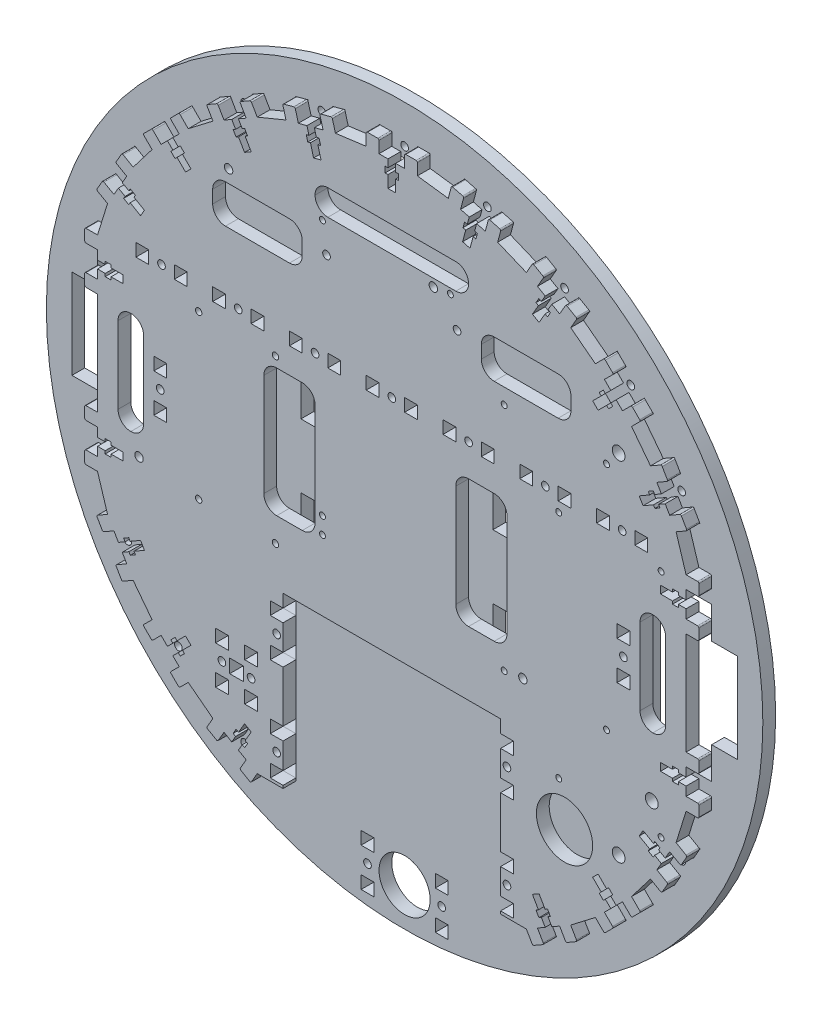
SolidWorks part; units mm, degrees
other "<Chassis_Sol>-<Boss.-Extru.1>"
ref_plane "Front Plane" through (0, 0, 0) normal (0, 0, 1) x (1, 0, 0)
ref_plane "Top Plane" through (0, 0, 0) normal (0, 1, 0) x (1, 0, 0)
ref_plane "Right Plane" through (0, 0, 0) normal (1, 0, 0) x (0, 0, -1)
sketch "Esquisse1-Chassis_Sol" plane through (-25.0653, 2.0467, 11.8361) normal (0, 0, 1) x (1, 0, 0)
  line L0 (-52, 117.8953) -> (-52, -122.7008) construction
  line L1 (0, -140) -> (0, 140) construction
  line L2 (52, 117.8953) -> (52, -122.7008) construction
  line L3 (-140, 0) -> (140, 0) construction
  line L4 (-85, 27.5) -> (-85, -27.5)
  line L5 (85, 27.5) -> (60, 27.5)
  line L6 (85, 27.5) -> (85, -27.5)
  line L7 (85, -27.5) -> (60, -27.5)
  line L8 (60, 27.5) -> (60, -27.5)
  line L9 (-85, -27.5) -> (-60, -27.5)
  line L10 (-60, 27.5) -> (-60, -27.5)
  line L11 (-85, 27.5) -> (-60, 27.5)
  line L12 (45, -49.1556) -> (45, -122.7008) construction
  line L13 (-45, -49.1556) -> (-45, -122.7008) construction
  line L14 (-10, 139.6424) -> (-10, 125) construction
  line L15 (-10, 125) -> (10, 125) construction
  line L16 (10, 125) -> (10, 139.6424) construction
  line L17 (-52, 42.5) -> (52, 42.5) construction
  line L18 (95, 30) -> (95, -30)
  line L19 (95, -30) -> (120, -30)
  line L20 (120, -30) -> (120, -17.5)
  line L21 (120, -17.5) -> (130, -17.5)
  line L22 (130, -17.5) -> (130, 17.5)
  line L23 (130, 17.5) -> (120, 17.5)
  line L24 (120, 17.5) -> (120, 30)
  line L25 (120, 30) -> (95, 30)
  line L26 (-120, 17.5) -> (-120, 30)
  line L27 (-130, 17.5) -> (-120, 17.5)
  line L28 (-130, -17.5) -> (-130, 17.5)
  line L29 (-120, -17.5) -> (-130, -17.5)
  line L30 (-120, -30) -> (-120, -17.5)
  line L31 (-95, -30) -> (-120, -30)
  line L32 (-95, 30) -> (-95, -30)
  line L33 (-120, 30) -> (-95, 30)
  line L34 (-20.5104, -115) -> (24.0423, -115) construction
  line L35 (-26.3093, -125) -> (32.4158, -125) construction
  line L36 (-28.8401, -7) -> (32.4158, -7) construction
  line L37 (40.5, 36) -> (40.5, 12.5)
  line L38 (-40.5, 36) -> (-34.5, 36)
  line L39 (-40.5, 36) -> (-40.5, 12.5)
  line L40 (-40.5, 12.5) -> (-34.5, 12.5)
  line L41 (-34.5, 36) -> (-34.5, 12.5)
  line L42 (40.5, 12.5) -> (34.5, 12.5)
  line L43 (40.5, 36) -> (34.5, 36)
  line L44 (34.5, 36) -> (34.5, 12.5)
  line L45 (40.5, -36) -> (34.5, -36)
  line L46 (40.5, -36) -> (40.5, -12.5)
  line L47 (40.5, -12.5) -> (34.5, -12.5)
  line L48 (34.5, -36) -> (34.5, -12.5)
  line L49 (-40.5, -36) -> (-34.5, -36)
  line L50 (-34.5, -36) -> (-34.5, -12.5)
  line L51 (-40.5, -12.5) -> (-34.5, -12.5)
  line L52 (-40.5, -36) -> (-40.5, -12.5)
  circle A0 centre (0, 0) radius 140
  circle A1 centre (0, -125) radius 10
  circle A2 centre (0, 111) radius 10
  point P26 (0, 0)
  point P72 (-37.5, 36)
  line B0 (54.5, 30) -> (54.5, 20) construction
  line B1 (57, 30) -> (57, 35)
  line B2 (57, 30) -> (52, 30)
  line B3 (52, 30) -> (52, 35)
  line B4 (57, 35) -> (52, 35)
  line B5 (57, 20) -> (57, 15)
  line B6 (57, 20) -> (52, 20)
  line B7 (52, 20) -> (52, 15)
  line B8 (57, 15) -> (52, 15)
  line B9 (54.5, 25) -> (61.4724, 25) construction
  circle B10 centre (54.5, 25) radius 1.5
  line B11 (54.5, -30) -> (54.5, -20) construction
  line B12 (57, -30) -> (57, -35)
  line B13 (57, -30) -> (52, -30)
  line B14 (52, -30) -> (52, -35)
  line B15 (57, -35) -> (52, -35)
  line B16 (57, -20) -> (57, -15)
  line B17 (57, -20) -> (52, -20)
  line B18 (52, -20) -> (52, -15)
  line B19 (57, -15) -> (52, -15)
  line B20 (54.5, -25) -> (61.4724, -25) construction
  circle B21 centre (54.5, -25) radius 1.5
  line B22 (15, 125) -> (25, 125) construction
  line B23 (15, 127.5) -> (10, 127.5)
  line B24 (15, 127.5) -> (15, 122.5)
  line B25 (15, 122.5) -> (10, 122.5)
  line B26 (10, 127.5) -> (10, 122.5)
  line B27 (25, 127.5) -> (30, 127.5)
  line B28 (25, 127.5) -> (25, 122.5)
  line B29 (25, 122.5) -> (30, 122.5)
  line B30 (30, 127.5) -> (30, 122.5)
  line B31 (20, 125) -> (20, 131.9724) construction
  circle B32 centre (20, 125) radius 1.5
  line B33 (-54.5, 30) -> (-54.5, 20) construction
  line B34 (-57, 30) -> (-57, 35)
  line B35 (-57, 30) -> (-52, 30)
  line B36 (-52, 30) -> (-52, 35)
  line B37 (-57, 35) -> (-52, 35)
  line B38 (-57, 20) -> (-57, 15)
  line B39 (-57, 20) -> (-52, 20)
  line B40 (-52, 20) -> (-52, 15)
  line B41 (-57, 15) -> (-52, 15)
  line B42 (-54.5, 25) -> (-61.4724, 25) construction
  circle B43 centre (-54.5, 25) radius 1.5
  line B44 (45, -65) -> (45, -55) construction
  line B45 (47.5, -65) -> (47.5, -70)
  line B46 (47.5, -65) -> (42.5, -65)
  line B47 (42.5, -65) -> (42.5, -70)
  line B48 (47.5, -70) -> (42.5, -70)
  line B49 (47.5, -55) -> (47.5, -50)
  line B50 (47.5, -55) -> (42.5, -55)
  line B51 (42.5, -55) -> (42.5, -50)
  line B52 (47.5, -50) -> (42.5, -50)
  line B53 (45, -60) -> (51.9724, -60) construction
  circle B54 centre (45, -60) radius 1.5
  line B55 (-45, -65) -> (-45, -55) construction
  line B56 (-47.5, -65) -> (-47.5, -70)
  line B57 (-47.5, -65) -> (-42.5, -65)
  line B58 (-42.5, -65) -> (-42.5, -70)
  line B59 (-47.5, -70) -> (-42.5, -70)
  line B60 (-47.5, -55) -> (-47.5, -50)
  line B61 (-47.5, -55) -> (-42.5, -55)
  line B62 (-42.5, -55) -> (-42.5, -50)
  line B63 (-47.5, -50) -> (-42.5, -50)
  line B64 (-45, -60) -> (-51.9724, -60) construction
  circle B65 centre (-45, -60) radius 1.5
  line B66 (45, -95) -> (45, -105) construction
  line B67 (42.5, -95) -> (42.5, -90)
  line B68 (42.5, -95) -> (47.5, -95)
  line B69 (47.5, -95) -> (47.5, -90)
  line B70 (42.5, -90) -> (47.5, -90)
  line B71 (42.5, -105) -> (42.5, -110)
  line B72 (42.5, -105) -> (47.5, -105)
  line B73 (47.5, -105) -> (47.5, -110)
  line B74 (42.5, -110) -> (47.5, -110)
  line B75 (45, -100) -> (38.0276, -100) construction
  circle B76 centre (45, -100) radius 1.5
  line B77 (-45, -105) -> (-45, -95) construction
  line B78 (-47.5, -105) -> (-47.5, -110)
  line B79 (-47.5, -105) -> (-42.5, -105)
  line B80 (-42.5, -105) -> (-42.5, -110)
  line B81 (-47.5, -110) -> (-42.5, -110)
  line B82 (-47.5, -95) -> (-47.5, -90)
  line B83 (-47.5, -95) -> (-42.5, -95)
  line B84 (-42.5, -95) -> (-42.5, -90)
  line B85 (-47.5, -90) -> (-42.5, -90)
  line B86 (-45, -100) -> (-51.9724, -100) construction
  circle B87 centre (-45, -100) radius 1.5
  line B88 (-5, 125) -> (5, 125) construction
  line B89 (-5, 127.5) -> (-10, 127.5)
  line B90 (-5, 127.5) -> (-5, 122.5)
  line B91 (-5, 122.5) -> (-10, 122.5)
  line B92 (-10, 127.5) -> (-10, 122.5)
  line B93 (5, 127.5) -> (10, 127.5)
  line B94 (5, 127.5) -> (5, 122.5)
  line B95 (5, 122.5) -> (10, 122.5)
  line B96 (10, 127.5) -> (10, 122.5)
  line B97 (0, 125) -> (0, 131.9724) construction
  circle B98 centre (0, 125) radius 1.5
  line B99 (27.5228, 122.0348) -> (37.182, 119.4466) construction
  line B100 (28.1698, 124.4496) -> (23.3402, 125.7437)
  line B101 (28.1698, 124.4496) -> (26.8757, 119.62)
  line B102 (26.8757, 119.62) -> (22.0461, 120.9141)
  line B103 (23.3402, 125.7437) -> (22.0461, 120.9141)
  line B104 (37.8291, 121.8614) -> (42.6587, 120.5674)
  line B105 (37.8291, 121.8614) -> (36.535, 117.0318)
  line B106 (36.535, 117.0318) -> (41.3646, 115.7377)
  line B107 (42.6587, 120.5674) -> (41.3646, 115.7377)
  line B108 (32.3524, 120.7407) -> (34.157, 127.4756) construction
  circle B109 centre (32.3524, 120.7407) radius 1.5
  line B110 (58.1699, 110.7532) -> (66.8301, 105.7532) construction
  line B111 (59.4199, 112.9182) -> (55.0897, 115.4182)
  line B112 (59.4199, 112.9182) -> (56.9199, 108.5881)
  line B113 (56.9199, 108.5881) -> (52.5897, 111.0881)
  line B114 (55.0897, 115.4182) -> (52.5897, 111.0881)
  line B115 (68.0801, 107.9182) -> (72.4103, 105.4182)
  line B116 (68.0801, 107.9182) -> (65.5801, 103.5881)
  line B117 (65.5801, 103.5881) -> (69.9103, 101.0881)
  line B118 (72.4103, 105.4182) -> (69.9103, 101.0881)
  line B119 (62.5, 108.2532) -> (65.9862, 114.2915) construction
  circle B120 centre (62.5, 108.2532) radius 1.5
  line B121 (84.8528, 91.9239) -> (91.9239, 84.8528) construction
  line B122 (86.6206, 93.6916) -> (83.085, 97.2272)
  line B123 (86.6206, 93.6916) -> (83.085, 90.1561)
  line B124 (83.085, 90.1561) -> (79.5495, 93.6916)
  line B125 (83.085, 97.2272) -> (79.5495, 93.6916)
  line B126 (93.6916, 86.6206) -> (97.2272, 83.085)
  line B127 (93.6916, 86.6206) -> (90.1561, 83.085)
  line B128 (90.1561, 83.085) -> (93.6916, 79.5495)
  line B129 (97.2272, 83.085) -> (93.6916, 79.5495)
  line B130 (88.3883, 88.3883) -> (93.3186, 93.3186) construction
  circle B131 centre (88.3883, 88.3883) radius 1.5
  line B132 (105.7532, 66.8301) -> (110.7532, 58.1699) construction
  line B133 (107.9182, 68.0801) -> (105.4182, 72.4103)
  line B134 (107.9182, 68.0801) -> (103.5881, 65.5801)
  line B135 (103.5881, 65.5801) -> (101.0881, 69.9103)
  line B136 (105.4182, 72.4103) -> (101.0881, 69.9103)
  line B137 (112.9182, 59.4199) -> (115.4182, 55.0897)
  line B138 (112.9182, 59.4199) -> (108.5881, 56.9199)
  line B139 (108.5881, 56.9199) -> (111.0881, 52.5897)
  line B140 (115.4182, 55.0897) -> (111.0881, 52.5897)
  line B141 (108.2532, 62.5) -> (114.2915, 65.9862) construction
  circle B142 centre (108.2532, 62.5) radius 1.5
  line B143 (125, 5) -> (125, -5) construction
  line B144 (127.5, 5) -> (127.5, 10)
  line B145 (127.5, 5) -> (122.5, 5)
  line B146 (122.5, 5) -> (122.5, 10)
  line B147 (127.5, 10) -> (122.5, 10)
  line B148 (127.5, -5) -> (127.5, -10)
  line B149 (127.5, -5) -> (122.5, -5)
  line B150 (122.5, -5) -> (122.5, -10)
  line B151 (127.5, -10) -> (122.5, -10)
  line B152 (125, 0) -> (131.9724, 0) construction
  circle B153 centre (125, 0) radius 1.5
  line B154 (110.7532, -58.1699) -> (105.7532, -66.8301) construction
  line B155 (112.9182, -59.4199) -> (115.4182, -55.0897)
  line B156 (112.9182, -59.4199) -> (108.5881, -56.9199)
  line B157 (108.5881, -56.9199) -> (111.0881, -52.5897)
  line B158 (115.4182, -55.0897) -> (111.0881, -52.5897)
  line B159 (107.9182, -68.0801) -> (105.4182, -72.4103)
  line B160 (107.9182, -68.0801) -> (103.5881, -65.5801)
  line B161 (103.5881, -65.5801) -> (101.0881, -69.9103)
  line B162 (105.4182, -72.4103) -> (101.0881, -69.9103)
  line B163 (108.2532, -62.5) -> (114.2915, -65.9862) construction
  circle B164 centre (108.2532, -62.5) radius 1.5
  line B165 (91.9239, -84.8528) -> (84.8528, -91.9239) construction
  line B166 (93.6916, -86.6206) -> (97.2272, -83.085)
  line B167 (93.6916, -86.6206) -> (90.1561, -83.085)
  line B168 (90.1561, -83.085) -> (93.6916, -79.5495)
  line B169 (97.2272, -83.085) -> (93.6916, -79.5495)
  line B170 (86.6206, -93.6916) -> (83.085, -97.2272)
  line B171 (86.6206, -93.6916) -> (83.085, -90.1561)
  line B172 (83.085, -90.1561) -> (79.5495, -93.6916)
  line B173 (83.085, -97.2272) -> (79.5495, -93.6916)
  line B174 (88.3883, -88.3883) -> (93.3186, -93.3186) construction
  circle B175 centre (88.3883, -88.3883) radius 1.5
  line B176 (66.8301, -105.7532) -> (58.1699, -110.7532) construction
  line B177 (68.0801, -107.9182) -> (72.4103, -105.4182)
  line B178 (68.0801, -107.9182) -> (65.5801, -103.5881)
  line B179 (65.5801, -103.5881) -> (69.9103, -101.0881)
  line B180 (72.4103, -105.4182) -> (69.9103, -101.0881)
  line B181 (59.4199, -112.9182) -> (55.0897, -115.4182)
  line B182 (59.4199, -112.9182) -> (56.9199, -108.5881)
  line B183 (56.9199, -108.5881) -> (52.5897, -111.0881)
  line B184 (55.0897, -115.4182) -> (52.5897, -111.0881)
  line B185 (62.5, -108.2532) -> (65.9862, -114.2915) construction
  circle B186 centre (62.5, -108.2532) radius 1.5
  line B187 (37.182, -119.4466) -> (27.5228, -122.0348) construction
  line B188 (37.8291, -121.8614) -> (42.6587, -120.5674)
  line B189 (37.8291, -121.8614) -> (36.535, -117.0318)
  line B190 (36.535, -117.0318) -> (41.3646, -115.7377)
  line B191 (42.6587, -120.5674) -> (41.3646, -115.7377)
  line B192 (28.1698, -124.4496) -> (23.3402, -125.7437)
  line B193 (28.1698, -124.4496) -> (26.8757, -119.62)
  line B194 (26.8757, -119.62) -> (22.0461, -120.9141)
  line B195 (23.3402, -125.7437) -> (22.0461, -120.9141)
  line B196 (32.3524, -120.7407) -> (34.157, -127.4756) construction
  circle B197 centre (32.3524, -120.7407) radius 1.5
  line B198 (5, -125) -> (-5, -125) construction
  line B199 (5, -127.5) -> (10, -127.5)
  line B200 (5, -127.5) -> (5, -122.5)
  line B201 (5, -122.5) -> (10, -122.5)
  line B202 (10, -127.5) -> (10, -122.5)
  line B203 (-5, -127.5) -> (-10, -127.5)
  line B204 (-5, -127.5) -> (-5, -122.5)
  line B205 (-5, -122.5) -> (-10, -122.5)
  line B206 (-10, -127.5) -> (-10, -122.5)
  line B207 (0, -125) -> (0, -131.9724) construction
  circle B208 centre (0, -125) radius 1.5
  line B209 (-27.5228, -122.0348) -> (-37.182, -119.4466) construction
  line B210 (-28.1698, -124.4496) -> (-23.3402, -125.7437)
  line B211 (-28.1698, -124.4496) -> (-26.8757, -119.62)
  line B212 (-26.8757, -119.62) -> (-22.0461, -120.9141)
  line B213 (-23.3402, -125.7437) -> (-22.0461, -120.9141)
  line B214 (-37.8291, -121.8614) -> (-42.6587, -120.5674)
  line B215 (-37.8291, -121.8614) -> (-36.535, -117.0318)
  line B216 (-36.535, -117.0318) -> (-41.3646, -115.7377)
  line B217 (-42.6587, -120.5674) -> (-41.3646, -115.7377)
  line B218 (-32.3524, -120.7407) -> (-34.157, -127.4756) construction
  circle B219 centre (-32.3524, -120.7407) radius 1.5
  line B220 (-58.1699, -110.7532) -> (-66.8301, -105.7532) construction
  line B221 (-59.4199, -112.9182) -> (-55.0897, -115.4182)
  line B222 (-59.4199, -112.9182) -> (-56.9199, -108.5881)
  line B223 (-56.9199, -108.5881) -> (-52.5897, -111.0881)
  line B224 (-55.0897, -115.4182) -> (-52.5897, -111.0881)
  line B225 (-68.0801, -107.9182) -> (-72.4103, -105.4182)
  line B226 (-68.0801, -107.9182) -> (-65.5801, -103.5881)
  line B227 (-65.5801, -103.5881) -> (-69.9103, -101.0881)
  line B228 (-72.4103, -105.4182) -> (-69.9103, -101.0881)
  line B229 (-62.5, -108.2532) -> (-65.9862, -114.2915) construction
  circle B230 centre (-62.5, -108.2532) radius 1.5
  line B231 (-84.8528, -91.9239) -> (-91.9239, -84.8528) construction
  line B232 (-86.6206, -93.6916) -> (-83.085, -97.2272)
  line B233 (-86.6206, -93.6916) -> (-83.085, -90.1561)
  line B234 (-83.085, -90.1561) -> (-79.5495, -93.6916)
  line B235 (-83.085, -97.2272) -> (-79.5495, -93.6916)
  line B236 (-93.6916, -86.6206) -> (-97.2272, -83.085)
  line B237 (-93.6916, -86.6206) -> (-90.1561, -83.085)
  line B238 (-90.1561, -83.085) -> (-93.6916, -79.5495)
  line B239 (-97.2272, -83.085) -> (-93.6916, -79.5495)
  line B240 (-88.3883, -88.3883) -> (-93.3186, -93.3186) construction
  circle B241 centre (-88.3883, -88.3883) radius 1.5
  line B242 (-105.7532, -66.8301) -> (-110.7532, -58.1699) construction
  line B243 (-107.9182, -68.0801) -> (-105.4182, -72.4103)
  line B244 (-107.9182, -68.0801) -> (-103.5881, -65.5801)
  line B245 (-103.5881, -65.5801) -> (-101.0881, -69.9103)
  line B246 (-105.4182, -72.4103) -> (-101.0881, -69.9103)
  line B247 (-112.9182, -59.4199) -> (-115.4182, -55.0897)
  line B248 (-112.9182, -59.4199) -> (-108.5881, -56.9199)
  line B249 (-108.5881, -56.9199) -> (-111.0881, -52.5897)
  line B250 (-115.4182, -55.0897) -> (-111.0881, -52.5897)
  line B251 (-108.2532, -62.5) -> (-114.2915, -65.9862) construction
  circle B252 centre (-108.2532, -62.5) radius 1.5
  line B253 (-125, -5) -> (-125, 5) construction
  line B254 (-127.5, -5) -> (-127.5, -10)
  line B255 (-127.5, -5) -> (-122.5, -5)
  line B256 (-122.5, -5) -> (-122.5, -10)
  line B257 (-127.5, -10) -> (-122.5, -10)
  line B258 (-127.5, 5) -> (-127.5, 10)
  line B259 (-127.5, 5) -> (-122.5, 5)
  line B260 (-122.5, 5) -> (-122.5, 10)
  line B261 (-127.5, 10) -> (-122.5, 10)
  line B262 (-125, 0) -> (-131.9724, 0) construction
  circle B263 centre (-125, 0) radius 1.5
  line B264 (-110.7532, 58.1699) -> (-105.7532, 66.8301) construction
  line B265 (-112.9182, 59.4199) -> (-115.4182, 55.0897)
  line B266 (-112.9182, 59.4199) -> (-108.5881, 56.9199)
  line B267 (-108.5881, 56.9199) -> (-111.0881, 52.5897)
  line B268 (-115.4182, 55.0897) -> (-111.0881, 52.5897)
  line B269 (-107.9182, 68.0801) -> (-105.4182, 72.4103)
  line B270 (-107.9182, 68.0801) -> (-103.5881, 65.5801)
  line B271 (-103.5881, 65.5801) -> (-101.0881, 69.9103)
  line B272 (-105.4182, 72.4103) -> (-101.0881, 69.9103)
  line B273 (-108.2532, 62.5) -> (-114.2915, 65.9862) construction
  circle B274 centre (-108.2532, 62.5) radius 1.5
  line B275 (-91.9239, 84.8528) -> (-84.8528, 91.9239) construction
  line B276 (-93.6916, 86.6206) -> (-97.2272, 83.085)
  line B277 (-93.6916, 86.6206) -> (-90.1561, 83.085)
  line B278 (-90.1561, 83.085) -> (-93.6916, 79.5495)
  line B279 (-97.2272, 83.085) -> (-93.6916, 79.5495)
  line B280 (-86.6206, 93.6916) -> (-83.085, 97.2272)
  line B281 (-86.6206, 93.6916) -> (-83.085, 90.1561)
  line B282 (-83.085, 90.1561) -> (-79.5495, 93.6916)
  line B283 (-83.085, 97.2272) -> (-79.5495, 93.6916)
  line B284 (-88.3883, 88.3883) -> (-93.3186, 93.3186) construction
  circle B285 centre (-88.3883, 88.3883) radius 1.5
  line B286 (-66.8301, 105.7532) -> (-58.1699, 110.7532) construction
  line B287 (-68.0801, 107.9182) -> (-72.4103, 105.4182)
  line B288 (-68.0801, 107.9182) -> (-65.5801, 103.5881)
  line B289 (-65.5801, 103.5881) -> (-69.9103, 101.0881)
  line B290 (-72.4103, 105.4182) -> (-69.9103, 101.0881)
  line B291 (-59.4199, 112.9182) -> (-55.0897, 115.4182)
  line B292 (-59.4199, 112.9182) -> (-56.9199, 108.5881)
  line B293 (-56.9199, 108.5881) -> (-52.5897, 111.0881)
  line B294 (-55.0897, 115.4182) -> (-52.5897, 111.0881)
  line B295 (-62.5, 108.2532) -> (-65.9862, 114.2915) construction
  circle B296 centre (-62.5, 108.2532) radius 1.5
  line B297 (-37.182, 119.4466) -> (-27.5228, 122.0348) construction
  line B298 (-37.8291, 121.8614) -> (-42.6587, 120.5674)
  line B299 (-37.8291, 121.8614) -> (-36.535, 117.0318)
  line B300 (-36.535, 117.0318) -> (-41.3646, 115.7377)
  line B301 (-42.6587, 120.5674) -> (-41.3646, 115.7377)
  line B302 (-28.1698, 124.4496) -> (-23.3402, 125.7437)
  line B303 (-28.1698, 124.4496) -> (-26.8757, 119.62)
  line B304 (-26.8757, 119.62) -> (-22.0461, 120.9141)
  line B305 (-23.3402, 125.7437) -> (-22.0461, 120.9141)
  line B306 (-32.3524, 120.7407) -> (-34.157, 127.4756) construction
  circle B307 centre (-32.3524, 120.7407) radius 1.5
  line B308 (-90.5, 5) -> (-90.5, -5) construction
  line B309 (-93, 5) -> (-93, 10)
  line B310 (-93, 5) -> (-88, 5)
  line B311 (-88, 5) -> (-88, 10)
  line B312 (-93, 10) -> (-88, 10)
  line B313 (-93, -5) -> (-93, -10)
  line B314 (-93, -5) -> (-88, -5)
  line B315 (-88, -5) -> (-88, -10)
  line B316 (-93, -10) -> (-88, -10)
  line B317 (-90.5, 0) -> (-97.4724, 0) construction
  circle B318 centre (-90.5, 0) radius 1.5
  line B319 (90.5, 5) -> (90.5, -5) construction
  line B320 (93, 5) -> (93, 10)
  line B321 (93, 5) -> (88, 5)
  line B322 (88, 5) -> (88, 10)
  line B323 (93, 10) -> (88, 10)
  line B324 (93, -5) -> (93, -10)
  line B325 (93, -5) -> (88, -5)
  line B326 (88, -5) -> (88, -10)
  line B327 (93, -10) -> (88, -10)
  line B328 (90.5, 0) -> (97.4724, 0) construction
  circle B329 centre (90.5, 0) radius 1.5
  line B330 (85, 42.5) -> (95, 42.5) construction
  line B331 (85, 45) -> (80, 45)
  line B332 (85, 45) -> (85, 40)
  line B333 (85, 40) -> (80, 40)
  line B334 (80, 45) -> (80, 40)
  line B335 (95, 45) -> (100, 45)
  line B336 (95, 45) -> (95, 40)
  line B337 (95, 40) -> (100, 40)
  line B338 (100, 45) -> (100, 40)
  line B339 (90, 42.5) -> (90, 49.4724) construction
  circle B340 centre (90, 42.5) radius 1.5
  line B341 (-5, 42.5) -> (5, 42.5) construction
  line B342 (-5, 45) -> (-10, 45)
  line B343 (-5, 45) -> (-5, 40)
  line B344 (-5, 40) -> (-10, 40)
  line B345 (-10, 45) -> (-10, 40)
  line B346 (5, 45) -> (10, 45)
  line B347 (5, 45) -> (5, 40)
  line B348 (5, 40) -> (10, 40)
  line B349 (10, 45) -> (10, 40)
  line B350 (0, 42.5) -> (0, 49.4724) construction
  circle B351 centre (0, 42.5) radius 1.5
  line B352 (-95, 42.5) -> (-85, 42.5) construction
  line B353 (-95, 45) -> (-100, 45)
  line B354 (-95, 45) -> (-95, 40)
  line B355 (-95, 40) -> (-100, 40)
  line B356 (-100, 45) -> (-100, 40)
  line B357 (-85, 45) -> (-80, 45)
  line B358 (-85, 45) -> (-85, 40)
  line B359 (-85, 40) -> (-80, 40)
  line B360 (-80, 45) -> (-80, 40)
  line B361 (-90, 42.5) -> (-90, 49.4724) construction
  circle B362 centre (-90, 42.5) radius 1.5
  line B363 (119.4466, 37.182) -> (122.0348, 27.5228) construction
  line B364 (121.8614, 37.8291) -> (120.5674, 42.6587)
  line B365 (121.8614, 37.8291) -> (117.0318, 36.535)
  line B366 (117.0318, 36.535) -> (115.7377, 41.3646)
  line B367 (120.5674, 42.6587) -> (115.7377, 41.3646)
  line B368 (124.4496, 28.1698) -> (125.7437, 23.3402)
  line B369 (124.4496, 28.1698) -> (119.62, 26.8757)
  line B370 (119.62, 26.8757) -> (120.9141, 22.0461)
  line B371 (125.7437, 23.3402) -> (120.9141, 22.0461)
  line B372 (120.7407, 32.3524) -> (127.4756, 34.157) construction
  circle B373 centre (120.7407, 32.3524) radius 1.5
  line B374 (122.0348, -27.5228) -> (119.4466, -37.182) construction
  line B375 (124.4496, -28.1698) -> (125.7437, -23.3402)
  line B376 (124.4496, -28.1698) -> (119.62, -26.8757)
  line B377 (119.62, -26.8757) -> (120.9141, -22.0461)
  line B378 (125.7437, -23.3402) -> (120.9141, -22.0461)
  line B379 (121.8614, -37.8291) -> (120.5674, -42.6587)
  line B380 (121.8614, -37.8291) -> (117.0318, -36.535)
  line B381 (117.0318, -36.535) -> (115.7377, -41.3646)
  line B382 (120.5674, -42.6587) -> (115.7377, -41.3646)
  line B383 (120.7407, -32.3524) -> (127.4756, -34.157) construction
  circle B384 centre (120.7407, -32.3524) radius 1.5
  line B385 (-119.4466, -37.182) -> (-122.0348, -27.5228) construction
  line B386 (-121.8614, -37.8291) -> (-120.5674, -42.6587)
  line B387 (-121.8614, -37.8291) -> (-117.0318, -36.535)
  line B388 (-117.0318, -36.535) -> (-115.7377, -41.3646)
  line B389 (-120.5674, -42.6587) -> (-115.7377, -41.3646)
  line B390 (-124.4496, -28.1698) -> (-125.7437, -23.3402)
  line B391 (-124.4496, -28.1698) -> (-119.62, -26.8757)
  line B392 (-119.62, -26.8757) -> (-120.9141, -22.0461)
  line B393 (-125.7437, -23.3402) -> (-120.9141, -22.0461)
  line B394 (-120.7407, -32.3524) -> (-127.4756, -34.157) construction
  circle B395 centre (-120.7407, -32.3524) radius 1.5
  line B396 (-122.0348, 27.5228) -> (-119.4466, 37.182) construction
  line B397 (-124.4496, 28.1698) -> (-125.7437, 23.3402)
  line B398 (-124.4496, 28.1698) -> (-119.62, 26.8757)
  line B399 (-119.62, 26.8757) -> (-120.9141, 22.0461)
  line B400 (-125.7437, 23.3402) -> (-120.9141, 22.0461)
  line B401 (-121.8614, 37.8291) -> (-120.5674, 42.6587)
  line B402 (-121.8614, 37.8291) -> (-117.0318, 36.535)
  line B403 (-117.0318, 36.535) -> (-115.7377, 41.3646)
  line B404 (-120.5674, 42.6587) -> (-115.7377, 41.3646)
  line B405 (-120.7407, 32.3524) -> (-127.4756, 34.157) construction
  circle B406 centre (-120.7407, 32.3524) radius 1.5
  line B407 (25, 42.5) -> (35, 42.5) construction
  line B408 (25, 45) -> (20, 45)
  line B409 (25, 45) -> (25, 40)
  line B410 (25, 40) -> (20, 40)
  line B411 (20, 45) -> (20, 40)
  line B412 (35, 45) -> (40, 45)
  line B413 (35, 45) -> (35, 40)
  line B414 (35, 40) -> (40, 40)
  line B415 (40, 45) -> (40, 40)
  line B416 (30, 42.5) -> (30, 49.4724) construction
  circle B417 centre (30, 42.5) radius 1.5
  line B418 (-35, 42.5) -> (-25, 42.5) construction
  line B419 (-35, 45) -> (-40, 45)
  line B420 (-35, 45) -> (-35, 40)
  line B421 (-35, 40) -> (-40, 40)
  line B422 (-40, 45) -> (-40, 40)
  line B423 (-25, 45) -> (-20, 45)
  line B424 (-25, 45) -> (-25, 40)
  line B425 (-25, 40) -> (-20, 40)
  line B426 (-20, 45) -> (-20, 40)
  line B427 (-30, 42.5) -> (-30, 49.4724) construction
  circle B428 centre (-30, 42.5) radius 1.5
  line B429 (-65, 42.5) -> (-55, 42.5) construction
  line B430 (-65, 45) -> (-70, 45)
  line B431 (-65, 45) -> (-65, 40)
  line B432 (-65, 40) -> (-70, 40)
  line B433 (-70, 45) -> (-70, 40)
  line B434 (-55, 45) -> (-50, 45)
  line B435 (-55, 45) -> (-55, 40)
  line B436 (-55, 40) -> (-50, 40)
  line B437 (-50, 45) -> (-50, 40)
  line B438 (-60, 42.5) -> (-60, 49.4724) construction
  circle B439 centre (-60, 42.5) radius 1.5
  line B440 (55, 42.5) -> (65, 42.5) construction
  line B441 (55, 45) -> (50, 45)
  line B442 (55, 45) -> (55, 40)
  line B443 (55, 40) -> (50, 40)
  line B444 (50, 45) -> (50, 40)
  line B445 (65, 45) -> (70, 45)
  line B446 (65, 45) -> (65, 40)
  line B447 (65, 40) -> (70, 40)
  line B448 (70, 45) -> (70, 40)
  line B449 (60, 42.5) -> (60, 49.4724) construction
  circle B450 centre (60, 42.5) radius 1.5
  line B451 (14.5, -120) -> (14.5, -130) construction
  line B452 (17, -120) -> (17, -115)
  line B453 (17, -120) -> (12, -120)
  line B454 (12, -120) -> (12, -115)
  line B455 (17, -115) -> (12, -115)
  line B456 (17, -130) -> (17, -135)
  line B457 (17, -130) -> (12, -130)
  line B458 (12, -130) -> (12, -135)
  line B459 (17, -135) -> (12, -135)
  line B460 (14.5, -125) -> (21.4724, -125) construction
  circle B461 centre (14.5, -125) radius 1.5
  line B462 (-14.5, -120) -> (-14.5, -130) construction
  line B463 (-17, -120) -> (-17, -115)
  line B464 (-17, -120) -> (-12, -120)
  line B465 (-12, -120) -> (-12, -115)
  line B466 (-17, -115) -> (-12, -115)
  line B467 (-17, -130) -> (-17, -135)
  line B468 (-17, -130) -> (-12, -130)
  line B469 (-12, -130) -> (-12, -135)
  line B470 (-17, -135) -> (-12, -135)
  line B471 (-14.5, -125) -> (-21.4724, -125) construction
  circle B472 centre (-14.5, -125) radius 1.5
  line B473 (-14.5, 106) -> (-14.5, 116) construction
  line B474 (-17, 106) -> (-17, 101)
  line B475 (-17, 106) -> (-12, 106)
  line B476 (-12, 106) -> (-12, 101)
  line B477 (-17, 101) -> (-12, 101)
  line B478 (-17, 116) -> (-17, 121)
  line B479 (-17, 116) -> (-12, 116)
  line B480 (-12, 116) -> (-12, 121)
  line B481 (-17, 121) -> (-12, 121)
  line B482 (-14.5, 111) -> (-21.4724, 111) construction
  circle B483 centre (-14.5, 111) radius 1.5
  line B484 (14.5, 106) -> (14.5, 116) construction
  line B485 (17, 106) -> (17, 101)
  line B486 (17, 106) -> (12, 106)
  line B487 (12, 106) -> (12, 101)
  line B488 (17, 101) -> (12, 101)
  line B489 (17, 116) -> (17, 121)
  line B490 (17, 116) -> (12, 116)
  line B491 (12, 116) -> (12, 121)
  line B492 (17, 121) -> (12, 121)
  line B493 (14.5, 111) -> (21.4724, 111) construction
  circle B494 centre (14.5, 111) radius 1.5
sketch_block_instance "Trou M3 plots 5mm-36-47-227-121"
sketch_block "Trou M3 plots 5mm-36-47-227" parameters "D2"=3, "D1"=5, "D3"=5, "D4"=10
sketch_block_instance "Trou M3 plots 5mm-36-47-227-122"
sketch_block_instance "Trou M3 plots 5mm-1"
sketch_block_instance "Trou M3 plots 5mm-36-47-227-124"
sketch_block_instance "Trou M3 plots 5mm-36-47-227-125"
sketch_block_instance "Trou M3 plots 5mm-36-47-227-126"
sketch_block_instance "Trou M3 plots 5mm-36-47-227-127"
sketch_block_instance "Trou M3 plots 5mm-36-47-227-128"
sketch_block_instance "Trou M3 plots 5mm-2"
sketch_block_instance "Trou M3 plots 5mm-36-47-227-130"
sketch_block_instance "Trou M3 plots 5mm-3"
sketch_block_instance "Trou M3 plots 5mm-36-47-227-132"
sketch_block_instance "Trou M3 plots 5mm-36-47-227-133"
sketch_block_instance "Trou M3 plots 5mm-36-47-227-134"
sketch_block_instance "Trou M3 plots 5mm-36-47-227-135"
sketch_block_instance "Trou M3 plots 5mm-36-47-227-136"
sketch_block_instance "Trou M3 plots 5mm-36-47-227-137"
sketch_block_instance "Trou M3 plots 5mm-36-47-227-138"
sketch_block_instance "Trou M3 plots 5mm-36-47-227-139"
sketch_block_instance "Trou M3 plots 5mm-36-47-227-140"
sketch_block_instance "Trou M3 plots 5mm-36-47-227-141"
sketch_block_instance "Trou M3 plots 5mm-36-47-227-142"
sketch_block_instance "Trou M3 plots 5mm-36-47-227-143"
sketch_block_instance "Trou M3 plots 5mm-36-47-227-144"
sketch_block_instance "Trou M3 plots 5mm-36-47-227-145"
sketch_block_instance "Trou M3 plots 5mm-36-47-227-146"
sketch_block_instance "Trou M3 plots 5mm-36-47-227-147"
sketch_block_instance "Trou M3 plots 5mm-36-47-227-148"
sketch_block_instance "Trou M3 plots 5mm-4"
sketch_block_instance "Trou M3 plots 5mm-5"
sketch_block_instance "Trou M3 plots 5mm-6"
sketch_block_instance "Trou M3 plots 5mm-7"
sketch_block_instance "Trou M3 plots 5mm-36-47-227-153"
sketch_block_instance "Trou M3 plots 5mm-36-47-227-154"
sketch_block_instance "Trou M3 plots 5mm-36-47-227-155"
sketch_block_instance "Trou M3 plots 5mm-36-47-227-156"
sketch_block_instance "Trou M3 plots 5mm-8"
sketch_block_instance "Trou M3 plots 5mm-36-47-227-158"
sketch_block_instance "Trou M3 plots 5mm-36-47-227-159"
sketch_block_instance "Trou M3 plots 5mm-36-47-227-160"
sketch_block_instance "Trou M3 plots 5mm-36-47-227-161"
sketch_block_instance "Trou M3 plots 5mm-36-47-227-162"
sketch_block_instance "Trou M3 plots 5mm-36-47-227-163"
sketch_block_instance "Trou M3 plots 5mm-36-47-227-164"
sketch_block_instance "Trou M3 plots 5mm-36-47-226-59" parameters "D1"=203.4762, "D24"=27.6613, "D25"=27.6613, "D2"=240.5961, "D3"=37.1831, "D4"=39.5969, "D5"=50, "D6"=62.9081, "D7"=40, "D8"=32.6763, "D9"=46.7721, "D10"=21.2912, "D12"=4.1884, "D13"=68.8145, "D14"=102, "D15"=45.4167, "D16"=45.4167, "D17"=28.1072, "D18"=5, "D19"=5.1855, "D20"=280, "D21"=28.4839, "D22"=23.158, "D23"=18.5435, "D26"=58.7251, "D27"=61.2559, "D28"=22.968, "D29"=8.3335, "D30"=10, "D31"=74.7198
inserted part "Chassis_Sol"
sketch "Sketch2" plane through (0, 0, 16.8361) normal (0, 0, 1) x (1, 0, 0)
  line L0 (-94.9755, -99.0414) -> (-77.655, -109.0414) construction
  line L1 (-104.6148, -91.645) -> (-118.7569, -77.5028) construction
  line L2 (-126.1534, -67.8636) -> (-136.1534, -50.5431) construction
  line L3 (27.5245, -109.0414) -> (44.845, -99.0414) construction
  line L4 (54.4842, -91.645) -> (68.6264, -77.5028) construction
  line L5 (76.0228, -67.8636) -> (86.0228, -50.5431) construction
  line L6 (86.0228, 54.6364) -> (76.0228, 71.9569) construction
  line L7 (68.6264, 81.5962) -> (54.4842, 95.7383) construction
  line L8 (44.845, 103.1348) -> (27.5245, 113.1348) construction
  line L9 (16.2993, 117.7844) -> (-3.0192, 122.9608) construction
  line L10 (-15.0653, 124.5467) -> (-35.0653, 124.5467) construction
  line L11 (-47.1114, 122.9608) -> (-66.4299, 117.7844) construction
  line L12 (-77.655, 113.1348) -> (-94.9755, 103.1348) construction
  line L13 (-104.6148, 95.7383) -> (-118.7569, 81.5962) construction
  line L14 (-126.1534, 71.9569) -> (-136.1534, 54.6364) construction
  line L15 (-86.3153, -104.0414) -> (-80.7049, -94.324) construction
  line L16 (-87.6143, -103.2914) -> (-90.6454, -101.5414)
  line L17 (-93.1454, -105.8716) -> (-97.4755, -103.3716)
  line L18 (-97.4755, -103.3716) -> (-94.9755, -99.0414)
  line L19 (-93.1454, -105.8716) -> (-90.6454, -101.5414)
  line L20 (-85.0162, -104.7914) -> (-81.9852, -106.5414)
  line L21 (-81.9852, -106.5414) -> (-84.4852, -110.8716)
  line L22 (-84.4852, -110.8716) -> (-80.155, -113.3716)
  line L23 (-80.155, -113.3716) -> (-77.655, -109.0414)
  line L24 (36.1847, -104.0414) -> (30.5743, -94.324) construction
  line L25 (34.8857, -104.7914) -> (31.8546, -106.5414)
  line L26 (34.3546, -110.8716) -> (30.0245, -113.3716)
  line L27 (30.0245, -113.3716) -> (27.5245, -109.0414)
  line L28 (34.3546, -110.8716) -> (31.8546, -106.5414)
  line L29 (37.4838, -103.2914) -> (40.5148, -101.5414)
  line L30 (40.5148, -101.5414) -> (43.0148, -105.8716)
  line L31 (43.0148, -105.8716) -> (47.345, -103.3716)
  line L32 (47.345, -103.3716) -> (44.845, -99.0414)
  line L33 (61.5553, -84.5739) -> (53.621, -76.6396) construction
  line L34 (60.4946, -85.6346) -> (58.0198, -88.1094)
  line L35 (61.5553, -91.645) -> (58.0198, -95.1805)
  line L36 (58.0198, -95.1805) -> (54.4842, -91.645)
  line L37 (61.5553, -91.645) -> (58.0198, -88.1094)
  line L38 (62.616, -83.5132) -> (65.0908, -81.0384)
  line L39 (65.0908, -81.0384) -> (68.6264, -84.5739)
  line L40 (68.6264, -84.5739) -> (72.1619, -81.0384)
  line L41 (72.1619, -81.0384) -> (68.6264, -77.5028)
  line L42 (-56.7706, 120.3726) -> (-53.8665, 109.5342) construction
  line L43 (-55.3217, 120.7608) -> (-51.941, 121.6667)
  line L44 (-53.2351, 126.4963) -> (-48.4055, 127.7904)
  line L45 (-48.4055, 127.7904) -> (-47.1114, 122.9608)
  line L46 (-53.2351, 126.4963) -> (-51.941, 121.6667)
  line L47 (-58.2195, 119.9844) -> (-61.6002, 119.0785)
  line L48 (-61.6002, 119.0785) -> (-62.8943, 123.9081)
  line L49 (-62.8943, 123.9081) -> (-67.724, 122.614)
  line L50 (-67.724, 122.614) -> (-66.4299, 117.7844)
  line L51 (-25.0653, 124.5467) -> (-25.0653, 113.3259) construction
  line L52 (-23.5653, 124.5467) -> (-20.0653, 124.5467)
  line L53 (-20.0653, 129.5467) -> (-15.0653, 129.5467)
  line L54 (-15.0653, 129.5467) -> (-15.0653, 124.5467)
  line L55 (-20.0653, 129.5467) -> (-20.0653, 124.5467)
  line L56 (-26.5653, 124.5467) -> (-30.0653, 124.5467)
  line L57 (-30.0653, 124.5467) -> (-30.0653, 129.5467)
  line L58 (-30.0653, 129.5467) -> (-35.0653, 129.5467)
  line L59 (-35.0653, 129.5467) -> (-35.0653, 124.5467)
  line L60 (-86.3153, 108.1348) -> (-80.7049, 98.4173) construction
  line L61 (-85.0162, 108.8848) -> (-81.9852, 110.6348)
  line L62 (-84.4852, 114.9649) -> (-80.155, 117.4649)
  line L63 (-80.155, 117.4649) -> (-77.655, 113.1348)
  line L64 (-84.4852, 114.9649) -> (-81.9852, 110.6348)
  line L65 (-87.6143, 107.3848) -> (-90.6454, 105.6348)
  line L66 (-90.6454, 105.6348) -> (-93.1454, 109.9649)
  line L67 (-93.1454, 109.9649) -> (-97.4755, 107.4649)
  line L68 (-97.4755, 107.4649) -> (-94.9755, 103.1348)
  line L69 (-111.6859, 88.6673) -> (-103.7516, 80.733) construction
  line L70 (-110.6252, 89.7279) -> (-108.1503, 92.2028)
  line L71 (-111.6859, 95.7383) -> (-108.1503, 99.2739)
  line L72 (-108.1503, 99.2739) -> (-104.6148, 95.7383)
  line L73 (-111.6859, 95.7383) -> (-108.1503, 92.2028)
  line L74 (-112.7465, 87.6066) -> (-115.2214, 85.1317)
  line L75 (-115.2214, 85.1317) -> (-118.7569, 88.6673)
  line L76 (-118.7569, 88.6673) -> (-122.2925, 85.1317)
  line L77 (-122.2925, 85.1317) -> (-118.7569, 81.5962)
  line L78 (61.5553, 88.6673) -> (53.621, 80.733) construction
  line L79 (62.616, 87.6066) -> (65.0908, 85.1317)
  line L80 (68.6264, 88.6673) -> (72.1619, 85.1317)
  line L81 (72.1619, 85.1317) -> (68.6264, 81.5962)
  line L82 (68.6264, 88.6673) -> (65.0908, 85.1317)
  line L83 (60.4946, 89.7279) -> (58.0198, 92.2028)
  line L84 (58.0198, 92.2028) -> (61.5553, 95.7383)
  line L85 (61.5553, 95.7383) -> (58.0198, 99.2739)
  line L86 (58.0198, 99.2739) -> (54.4842, 95.7383)
  line L87 (81.0228, 63.2967) -> (71.3054, 57.6863) construction
  line L88 (81.7728, 61.9976) -> (83.5228, 58.9665)
  line L89 (87.853, 61.4665) -> (90.353, 57.1364)
  line L90 (90.353, 57.1364) -> (86.0228, 54.6364)
  line L91 (87.853, 61.4665) -> (83.5228, 58.9665)
  line L92 (80.2728, 64.5957) -> (78.5228, 67.6268)
  line L93 (78.5228, 67.6268) -> (82.853, 70.1268)
  line L94 (82.853, 70.1268) -> (80.353, 74.4569)
  line L95 (80.353, 74.4569) -> (76.0228, 71.9569)
  line L96 (36.1847, 108.1348) -> (30.5743, 98.4173) construction
  line L97 (37.4838, 107.3848) -> (40.5148, 105.6348)
  line L98 (43.0148, 109.9649) -> (47.345, 107.4649)
  line L99 (47.345, 107.4649) -> (44.845, 103.1348)
  line L100 (43.0148, 109.9649) -> (40.5148, 105.6348)
  line L101 (34.8857, 108.8848) -> (31.8546, 110.6348)
  line L102 (31.8546, 110.6348) -> (34.3546, 114.9649)
  line L103 (34.3546, 114.9649) -> (30.0245, 117.4649)
  line L104 (30.0245, 117.4649) -> (27.5245, 113.1348)
  line L105 (-131.1534, 63.2967) -> (-121.4359, 57.6863) construction
  line L106 (-130.4034, 64.5957) -> (-128.6534, 67.6268)
  line L107 (-132.9835, 70.1268) -> (-130.4835, 74.4569)
  line L108 (-130.4835, 74.4569) -> (-126.1534, 71.9569)
  line L109 (-132.9835, 70.1268) -> (-128.6534, 67.6268)
  line L110 (-131.9034, 61.9976) -> (-133.6534, 58.9665)
  line L111 (-133.6534, 58.9665) -> (-137.9835, 61.4665)
  line L112 (-137.9835, 61.4665) -> (-140.4835, 57.1364)
  line L113 (-140.4835, 57.1364) -> (-136.1534, 54.6364)
  line L114 (-131.1534, -59.2033) -> (-121.4359, -53.5929) construction
  line L115 (-131.9034, -57.9043) -> (-133.6534, -54.8732)
  line L116 (-137.9835, -57.3732) -> (-140.4835, -53.0431)
  line L117 (-140.4835, -53.0431) -> (-136.1534, -50.5431)
  line L118 (-137.9835, -57.3732) -> (-133.6534, -54.8732)
  line L119 (-130.4034, -60.5024) -> (-128.6534, -63.5335)
  line L120 (-128.6534, -63.5335) -> (-132.9835, -66.0335)
  line L121 (-132.9835, -66.0335) -> (-130.4835, -70.3636)
  line L122 (-130.4835, -70.3636) -> (-126.1534, -67.8636)
  line L123 (81.0228, -59.2033) -> (71.3054, -53.5929) construction
  line L124 (80.2728, -60.5024) -> (78.5228, -63.5335)
  line L125 (82.853, -66.0335) -> (80.353, -70.3636)
  line L126 (80.353, -70.3636) -> (76.0228, -67.8636)
  line L127 (82.853, -66.0335) -> (78.5228, -63.5335)
  line L128 (81.7728, -57.9043) -> (83.5228, -54.8732)
  line L129 (83.5228, -54.8732) -> (87.853, -57.3732)
  line L130 (87.853, -57.3732) -> (90.353, -53.0431)
  line L131 (90.353, -53.0431) -> (86.0228, -50.5431)
  line L132 (-111.6859, -84.5739) -> (-103.7516, -76.6396) construction
  line L133 (-112.7465, -83.5132) -> (-115.2214, -81.0384)
  line L134 (-118.7569, -84.5739) -> (-122.2925, -81.0384)
  line L135 (-122.2925, -81.0384) -> (-118.7569, -77.5028)
  line L136 (-118.7569, -84.5739) -> (-115.2214, -81.0384)
  line L137 (-110.6252, -85.6346) -> (-108.1503, -88.1094)
  line L138 (-108.1503, -88.1094) -> (-111.6859, -91.645)
  line L139 (-111.6859, -91.645) -> (-108.1503, -95.1805)
  line L140 (-108.1503, -95.1805) -> (-104.6148, -91.645)
  line L141 (6.6401, 120.3726) -> (3.7359, 109.5342) construction
  line L142 (8.0889, 119.9844) -> (11.4697, 119.0785)
  line L143 (12.7638, 123.9081) -> (17.5934, 122.614)
  line L144 (17.5934, 122.614) -> (16.2993, 117.7844)
  line L145 (12.7638, 123.9081) -> (11.4697, 119.0785)
  line L146 (5.1912, 120.7608) -> (1.8104, 121.6667)
  line L147 (1.8104, 121.6667) -> (3.1045, 126.4963)
  line L148 (3.1045, 126.4963) -> (-1.7251, 127.7904)
  line L149 (-1.7251, 127.7904) -> (-3.0192, 122.9608)
  line L150 (-118.7569, 81.5962) -> (-126.1534, 71.9569)
  line L151 (-104.6148, 95.7383) -> (-94.9755, 103.1348)
  line L152 (-77.655, 113.1348) -> (-66.4299, 117.7844)
  line L153 (-47.1114, 122.9608) -> (-35.0653, 124.5467)
  line L154 (-15.0653, 124.5467) -> (-3.0192, 122.9608)
  line L155 (16.2993, 117.7844) -> (27.5245, 113.1348)
  line L156 (44.845, 103.1348) -> (54.4842, 95.7383)
  line L157 (68.6264, 81.5962) -> (76.0228, 71.9569)
  line L158 (76.0228, -67.8636) -> (68.6264, -77.5028)
  line L159 (54.4842, -91.645) -> (44.845, -99.0414)
  line L160 (-126.1534, -67.8636) -> (-118.7569, -77.5028)
  line L161 (-104.6148, -91.645) -> (-94.9755, -99.0414)
  line L162 (-77.655, -109.0414) -> (-72.5653, -109.0414)
  line L163 (-72.5653, -109.0414) -> (-72.5653, -40.4503) construction
  line L164 (-72.5653, -40.4503) -> (22.4347, -40.4503) construction
  line L165 (22.4347, -40.4503) -> (22.4347, -109.0414) construction
  line L166 (22.4347, -109.0414) -> (27.5245, -109.0414)
  line L169 (-67.5653, -47.9533) -> (-72.5653, -47.9533) construction
  line L172 (60.4946, -85.6346) -> (62.616, -83.5132) construction
  line L173 (62.616, -83.5132) -> (60.4946, -81.3919)
  line L174 (58.8683, -79.7656) -> (59.6461, -78.9878)
  line L175 (57.5955, -84.2911) -> (55.9692, -82.6647)
  line L176 (61.2725, -80.6141) -> (60.4946, -81.3919)
  line L177 (58.8683, -79.7656) -> (55.5449, -76.4422)
  line L178 (55.5449, -76.4422) -> (53.4236, -78.5635)
  line L179 (53.4236, -78.5635) -> (56.747, -81.8869)
  line L180 (58.3733, -83.5132) -> (57.5955, -84.2911)
  line L181 (59.6461, -78.9878) -> (61.2725, -80.6141)
  line L182 (55.9692, -82.6647) -> (56.747, -81.8869)
  line L183 (58.3733, -83.5132) -> (60.4946, -85.6346)
  line L184 (54.4842, -77.5028) -> (61.5553, -84.5739) construction
  line L185 (-87.6143, -103.2914) -> (-85.0162, -104.7914) construction
  line L186 (-85.0162, -104.7914) -> (-83.5162, -102.1934)
  line L187 (-82.3662, -100.2015) -> (-81.4136, -100.7515)
  line L188 (-87.0669, -100.1434) -> (-85.9169, -98.1515)
  line L189 (-82.5636, -102.7434) -> (-83.5162, -102.1934)
  line L190 (-82.3662, -100.2015) -> (-80.0162, -96.1312)
  line L191 (-80.0162, -96.1312) -> (-82.6143, -94.6312)
  line L192 (-82.6143, -94.6312) -> (-84.9643, -98.7015)
  line L193 (-86.1143, -100.6934) -> (-87.0669, -100.1434)
  line L194 (-81.4136, -100.7515) -> (-82.5636, -102.7434)
  line L195 (-85.9169, -98.1515) -> (-84.9643, -98.7015)
  line L196 (-86.1143, -100.6934) -> (-87.6143, -103.2914)
  line L197 (-81.3153, -95.3812) -> (-86.3153, -104.0414) construction
  line L198 (34.8857, -104.7914) -> (37.4838, -103.2914) construction
  line L199 (37.4838, -103.2914) -> (35.9838, -100.6934)
  line L200 (34.8338, -98.7015) -> (35.7864, -98.1515)
  line L201 (32.4331, -102.7434) -> (31.2831, -100.7515)
  line L202 (36.9364, -100.1434) -> (35.9838, -100.6934)
  line L203 (34.8338, -98.7015) -> (32.4838, -94.6312)
  line L204 (32.4838, -94.6312) -> (29.8857, -96.1312)
  line L205 (29.8857, -96.1312) -> (32.2357, -100.2015)
  line L206 (33.3857, -102.1934) -> (32.4331, -102.7434)
  line L207 (35.7864, -98.1515) -> (36.9364, -100.1434)
  line L208 (31.2831, -100.7515) -> (32.2357, -100.2015)
  line L209 (33.3857, -102.1934) -> (34.8857, -104.7914)
  line L210 (31.1847, -95.3812) -> (36.1847, -104.0414) construction
  line L211 (81.7728, 61.9976) -> (80.2728, 64.5957) construction
  line L212 (80.2728, 64.5957) -> (77.6748, 63.0957)
  line L213 (75.6829, 61.9457) -> (75.1329, 62.8983)
  line L214 (79.7248, 59.545) -> (77.7329, 58.395)
  line L215 (77.1248, 64.0483) -> (77.6748, 63.0957)
  line L216 (75.6829, 61.9457) -> (71.6126, 59.5957)
  line L217 (71.6126, 59.5957) -> (73.1126, 56.9976)
  line L218 (73.1126, 56.9976) -> (77.1829, 59.3476)
  line L219 (79.1748, 60.4976) -> (79.7248, 59.545)
  line L220 (75.1329, 62.8983) -> (77.1248, 64.0483)
  line L221 (77.7329, 58.395) -> (77.1829, 59.3476)
  line L222 (79.1748, 60.4976) -> (81.7728, 61.9976)
  line L223 (72.3626, 58.2967) -> (81.0228, 63.2967) construction
  line L224 (80.2728, -60.5024) -> (81.7728, -57.9043) construction
  line L225 (81.7728, -57.9043) -> (79.1748, -56.4043)
  line L226 (77.1829, -55.2543) -> (77.7329, -54.3017)
  line L227 (77.1248, -59.955) -> (75.1329, -58.805)
  line L228 (79.7248, -55.4517) -> (79.1748, -56.4043)
  line L229 (77.1829, -55.2543) -> (73.1126, -52.9043)
  line L230 (73.1126, -52.9043) -> (71.6126, -55.5024)
  line L231 (71.6126, -55.5024) -> (75.6829, -57.8524)
  line L232 (77.6748, -59.0024) -> (77.1248, -59.955)
  line L233 (77.7329, -54.3017) -> (79.7248, -55.4517)
  line L234 (75.1329, -58.805) -> (75.6829, -57.8524)
  line L235 (77.6748, -59.0024) -> (80.2728, -60.5024)
  line L236 (72.3626, -54.2033) -> (81.0228, -59.2033) construction
  line L237 (-112.7465, -83.5132) -> (-110.6252, -85.6346) construction
  line L238 (-110.6252, -85.6346) -> (-108.5039, -83.5132)
  line L239 (-106.8775, -81.8869) -> (-106.0997, -82.6647)
  line L240 (-111.403, -80.6141) -> (-109.7767, -78.9878)
  line L241 (-107.7261, -84.2911) -> (-108.5039, -83.5132)
  line L242 (-106.8775, -81.8869) -> (-103.5541, -78.5635)
  line L243 (-103.5541, -78.5635) -> (-105.6755, -76.4422)
  line L244 (-105.6755, -76.4422) -> (-108.9989, -79.7656)
  line L245 (-110.6252, -81.3919) -> (-111.403, -80.6141)
  line L246 (-106.0997, -82.6647) -> (-107.7261, -84.2911)
  line L247 (-109.7767, -78.9878) -> (-108.9989, -79.7656)
  line L248 (-110.6252, -81.3919) -> (-112.7465, -83.5132)
  line L249 (-104.6148, -77.5028) -> (-111.6859, -84.5739) construction
  line L250 (8.0889, 119.9844) -> (5.1912, 120.7608) construction
  line L251 (5.1912, 120.7608) -> (4.4147, 117.863)
  line L252 (3.8194, 115.6414) -> (2.7569, 115.9261)
  line L253 (8.375, 116.8019) -> (7.7797, 114.5803)
  line L254 (3.3522, 118.1477) -> (4.4147, 117.863)
  line L255 (3.8194, 115.6414) -> (2.603, 111.1016)
  line L256 (2.603, 111.1016) -> (5.5008, 110.3251)
  line L257 (5.5008, 110.3251) -> (6.7172, 114.865)
  line L258 (7.3125, 117.0866) -> (8.375, 116.8019)
  line L259 (2.7569, 115.9261) -> (3.3522, 118.1477)
  line L260 (7.7797, 114.5803) -> (6.7172, 114.865)
  line L261 (7.3125, 117.0866) -> (8.0889, 119.9844)
  line L262 (4.0519, 110.7133) -> (6.6401, 120.3726) construction
  line L263 (-85.0162, 108.8848) -> (-87.6143, 107.3848) construction
  line L264 (-87.6143, 107.3848) -> (-86.1143, 104.7867)
  line L265 (-84.9643, 102.7949) -> (-85.9169, 102.2449)
  line L266 (-82.5636, 106.8367) -> (-81.4136, 104.8449)
  line L267 (-87.0669, 104.2367) -> (-86.1143, 104.7867)
  line L268 (-84.9643, 102.7949) -> (-82.6143, 98.7245)
  line L269 (-82.6143, 98.7245) -> (-80.0162, 100.2245)
  line L270 (-80.0162, 100.2245) -> (-82.3662, 104.2949)
  line L271 (-83.5162, 106.2867) -> (-82.5636, 106.8367)
  line L272 (-85.9169, 102.2449) -> (-87.0669, 104.2367)
  line L273 (-81.4136, 104.8449) -> (-82.3662, 104.2949)
  line L274 (-83.5162, 106.2867) -> (-85.0162, 108.8848)
  line L275 (-81.3153, 99.4745) -> (-86.3153, 108.1348) construction
  line L276 (-23.5653, 124.5467) -> (-26.5653, 124.5467) construction
  line L277 (-26.5653, 124.5467) -> (-26.5653, 121.5467)
  line L278 (-26.5653, 119.2467) -> (-27.6653, 119.2467)
  line L279 (-22.4653, 121.5467) -> (-22.4653, 119.2467)
  line L280 (-27.6653, 121.5467) -> (-26.5653, 121.5467)
  line L281 (-26.5653, 119.2467) -> (-26.5653, 114.5467)
  line L282 (-26.5653, 114.5467) -> (-23.5653, 114.5467)
  line L283 (-23.5653, 114.5467) -> (-23.5653, 119.2467)
  line L284 (-23.5653, 121.5467) -> (-22.4653, 121.5467)
  line L285 (-27.6653, 119.2467) -> (-27.6653, 121.5467)
  line L286 (-22.4653, 119.2467) -> (-23.5653, 119.2467)
  line L287 (-23.5653, 121.5467) -> (-23.5653, 124.5467)
  line L288 (-25.0653, 114.5467) -> (-25.0653, 124.5467) construction
  line L289 (-110.6252, 89.7279) -> (-112.7465, 87.6066) construction
  line L290 (-112.7465, 87.6066) -> (-110.6252, 85.4853)
  line L291 (-108.9989, 83.8589) -> (-109.7767, 83.0811)
  line L292 (-107.7261, 88.3844) -> (-106.0997, 86.7581)
  line L293 (-111.403, 84.7075) -> (-110.6252, 85.4853)
  line L294 (-108.9989, 83.8589) -> (-105.6755, 80.5355)
  line L295 (-105.6755, 80.5355) -> (-103.5541, 82.6568)
  line L296 (-103.5541, 82.6568) -> (-106.8775, 85.9802)
  line L297 (-108.5039, 87.6066) -> (-107.7261, 88.3844)
  line L298 (-109.7767, 83.0811) -> (-111.403, 84.7075)
  line L299 (-106.0997, 86.7581) -> (-106.8775, 85.9802)
  line L300 (-108.5039, 87.6066) -> (-110.6252, 89.7279)
  line L301 (-104.6148, 81.5962) -> (-111.6859, 88.6673) construction
  line L302 (-130.4034, 64.5957) -> (-131.9034, 61.9976) construction
  line L303 (-131.9034, 61.9976) -> (-129.3053, 60.4976)
  line L304 (-127.3135, 59.3476) -> (-127.8635, 58.395)
  line L305 (-127.2553, 64.0483) -> (-125.2635, 62.8983)
  line L306 (-129.8553, 59.545) -> (-129.3053, 60.4976)
  line L307 (-127.3135, 59.3476) -> (-123.2431, 56.9976)
  line L308 (-123.2431, 56.9976) -> (-121.7431, 59.5957)
  line L309 (-121.7431, 59.5957) -> (-125.8135, 61.9457)
  line L310 (-127.8053, 63.0957) -> (-127.2553, 64.0483)
  line L311 (-127.8635, 58.395) -> (-129.8553, 59.545)
  line L312 (-125.2635, 62.8983) -> (-125.8135, 61.9457)
  line L313 (-127.8053, 63.0957) -> (-130.4034, 64.5957)
  line L314 (-122.4931, 58.2967) -> (-131.1534, 63.2967) construction
  line L315 (-55.3217, 120.7608) -> (-58.2195, 119.9844) construction
  line L316 (-58.2195, 119.9844) -> (-57.443, 117.0866)
  line L317 (-56.8478, 114.865) -> (-57.9103, 114.5803)
  line L318 (-53.4827, 118.1477) -> (-52.8875, 115.9261)
  line L319 (-58.5056, 116.8019) -> (-57.443, 117.0866)
  line L320 (-56.8478, 114.865) -> (-55.6313, 110.3251)
  line L321 (-55.6313, 110.3251) -> (-52.7335, 111.1016)
  line L322 (-52.7335, 111.1016) -> (-53.95, 115.6414)
  line L323 (-54.5453, 117.863) -> (-53.4827, 118.1477)
  line L324 (-57.9103, 114.5803) -> (-58.5056, 116.8019)
  line L325 (-52.8875, 115.9261) -> (-53.95, 115.6414)
  line L326 (-54.5453, 117.863) -> (-55.3217, 120.7608)
  line L327 (-54.1824, 110.7133) -> (-56.7706, 120.3726) construction
  line L328 (-131.9034, -57.9043) -> (-130.4034, -60.5024) construction
  line L329 (-130.4034, -60.5024) -> (-127.8053, -59.0024)
  line L330 (-125.8135, -57.8524) -> (-125.2635, -58.805)
  line L331 (-129.8553, -55.4517) -> (-127.8635, -54.3017)
  line L332 (-127.2553, -59.955) -> (-127.8053, -59.0024)
  line L333 (-125.8135, -57.8524) -> (-121.7431, -55.5024)
  line L334 (-121.7431, -55.5024) -> (-123.2431, -52.9043)
  line L335 (-123.2431, -52.9043) -> (-127.3135, -55.2543)
  line L336 (-129.3053, -56.4043) -> (-129.8553, -55.4517)
  line L337 (-125.2635, -58.805) -> (-127.2553, -59.955)
  line L338 (-127.8635, -54.3017) -> (-127.3135, -55.2543)
  line L339 (-129.3053, -56.4043) -> (-131.9034, -57.9043)
  line L340 (-122.4931, -54.2033) -> (-131.1534, -59.2033) construction
  line L341 (37.4838, 107.3848) -> (34.8857, 108.8848) construction
  line L342 (34.8857, 108.8848) -> (33.3857, 106.2867)
  line L343 (32.2357, 104.2949) -> (31.2831, 104.8449)
  line L344 (36.9364, 104.2367) -> (35.7864, 102.2449)
  line L345 (32.4331, 106.8367) -> (33.3857, 106.2867)
  line L346 (32.2357, 104.2949) -> (29.8857, 100.2245)
  line L347 (29.8857, 100.2245) -> (32.4838, 98.7245)
  line L348 (32.4838, 98.7245) -> (34.8338, 102.7949)
  line L349 (35.9838, 104.7867) -> (36.9364, 104.2367)
  line L350 (31.2831, 104.8449) -> (32.4331, 106.8367)
  line L351 (35.7864, 102.2449) -> (34.8338, 102.7949)
  line L352 (35.9838, 104.7867) -> (37.4838, 107.3848)
  line L353 (31.1847, 99.4745) -> (36.1847, 108.1348) construction
  line L354 (62.616, 87.6066) -> (60.4946, 89.7279) construction
  line L355 (60.4946, 89.7279) -> (58.3733, 87.6066)
  line L356 (56.747, 85.9802) -> (55.9692, 86.7581)
  line L357 (61.2725, 84.7075) -> (59.6461, 83.0811)
  line L358 (57.5955, 88.3844) -> (58.3733, 87.6066)
  line L359 (56.747, 85.9802) -> (53.4236, 82.6568)
  line L360 (53.4236, 82.6568) -> (55.5449, 80.5355)
  line L361 (55.5449, 80.5355) -> (58.8683, 83.8589)
  line L362 (60.4946, 85.4853) -> (61.2725, 84.7075)
  line L363 (55.9692, 86.7581) -> (57.5955, 88.3844)
  line L364 (59.6461, 83.0811) -> (58.8683, 83.8589)
  line L365 (60.4946, 85.4853) -> (62.616, 87.6066)
  line L366 (54.4842, 81.5962) -> (61.5553, 88.6673) construction
  line L367 (22.4347, -52.9533) -> (22.4347, -47.9533) construction
  line L368 (-72.5653, -47.9533) -> (-72.5653, -52.9533) construction
  line L369 (-72.5653, -109.0414) -> (-72.5653, -42.9533) construction
  line L384 (-95.0653, 47.0467) -> (-95.0653, 42.0467) construction
  line L386 (-105.0653, 42.0467) -> (-105.0653, 47.0467) construction
  line L387 (-35.0653, 42.0467) -> (-30.0653, 42.0467) construction
  line L388 (54.9347, 47.0467) -> (54.9347, 42.0467) construction
  line L393 (-90.0653, 47.0467) -> (-95.0653, 47.0467) construction
  line L394 (22.4347, -109.0414) -> (17.4347, -109.0414)
  line L395 (17.4347, -109.0414) -> (17.4347, -42.9533)
  line L398 (-67.5653, -42.9533) -> (-67.5653, -109.0414)
  line L399 (-67.5653, -109.0414) -> (-72.5653, -109.0414)
  line L400 (-67.5653, -42.9533) -> (17.4347, -42.9533)
  line L401 (-108.5928, 2.0467) -> (58.4623, 2.0467) construction
  line L403 (89.9347, 22.0467) -> (89.9347, -17.9533)
  line L405 (89.9347, -27.9533) -> (68.099, -27.9533) construction
  line L406 (89.9347, -29.4533) -> (89.9347, -32.9533)
  line L407 (94.9347, -32.9533) -> (94.9347, -37.9533)
  line L408 (94.9347, -37.9533) -> (89.9347, -37.9533)
  line L409 (94.9347, -32.9533) -> (89.9347, -32.9533)
  line L410 (89.9347, -26.4533) -> (89.9347, -22.9533)
  line L411 (89.9347, -22.9533) -> (94.9347, -22.9533)
  line L412 (94.9347, -22.9533) -> (94.9347, -17.9533)
  line L413 (94.9347, -17.9533) -> (89.9347, -17.9533)
  line L414 (89.9347, 32.0467) -> (68.099, 32.0467) construction
  line L415 (89.9347, 30.5467) -> (89.9347, 27.0467)
  line L416 (94.9347, 27.0467) -> (94.9347, 22.0467)
  line L417 (94.9347, 22.0467) -> (89.9347, 22.0467)
  line L418 (94.9347, 27.0467) -> (89.9347, 27.0467)
  line L419 (89.9347, 33.5467) -> (89.9347, 37.0467)
  line L420 (89.9347, 37.0467) -> (94.9347, 37.0467)
  line L421 (94.9347, 37.0467) -> (94.9347, 42.0467)
  line L422 (94.9347, 42.0467) -> (89.9347, 42.0467)
  line L423 (89.9347, 30.5467) -> (89.9347, 33.5467) construction
  line L424 (89.9347, 33.5467) -> (86.9347, 33.5467)
  line L425 (84.6347, 33.5467) -> (84.6347, 34.6467)
  line L426 (86.9347, 29.4467) -> (84.6347, 29.4467)
  line L427 (86.9347, 34.6467) -> (86.9347, 33.5467)
  line L428 (84.6347, 33.5467) -> (79.9347, 33.5467)
  line L429 (79.9347, 33.5467) -> (79.9347, 30.5467)
  line L430 (79.9347, 30.5467) -> (84.6347, 30.5467)
  line L431 (86.9347, 30.5467) -> (86.9347, 29.4467)
  line L432 (84.6347, 34.6467) -> (86.9347, 34.6467)
  line L433 (84.6347, 29.4467) -> (84.6347, 30.5467)
  line L434 (86.9347, 30.5467) -> (89.9347, 30.5467)
  line L435 (79.9347, 32.0467) -> (89.9347, 32.0467) construction
  line L436 (-145.0653, -37.9533) -> (-140.0653, -37.9533)
  line L437 (-145.0653, -32.9533) -> (-145.0653, -37.9533)
  line L438 (89.9347, -29.4533) -> (89.9347, -26.4533) construction
  line L439 (89.9347, -26.4533) -> (86.9347, -26.4533)
  line L440 (84.6347, -26.4533) -> (84.6347, -25.3533)
  line L441 (86.9347, -30.5533) -> (84.6347, -30.5533)
  line L442 (86.9347, -25.3533) -> (86.9347, -26.4533)
  line L443 (84.6347, -26.4533) -> (79.9347, -26.4533)
  line L444 (79.9347, -26.4533) -> (79.9347, -29.4533)
  line L445 (79.9347, -29.4533) -> (84.6347, -29.4533)
  line L446 (86.9347, -29.4533) -> (86.9347, -30.5533)
  line L447 (84.6347, -25.3533) -> (86.9347, -25.3533)
  line L448 (84.6347, -30.5533) -> (84.6347, -29.4533)
  line L449 (86.9347, -29.4533) -> (89.9347, -29.4533)
  line L450 (79.9347, -27.9533) -> (89.9347, -27.9533) construction
  line L451 (-145.0653, -32.9533) -> (-140.0653, -32.9533)
  line L452 (-140.0653, -29.4533) -> (-140.0653, -32.9533)
  line L453 (-137.0653, -29.4533) -> (-140.0653, -29.4533)
  line L454 (-137.0653, -29.4533) -> (-137.0653, -30.5533)
  line L455 (-137.0653, -30.5533) -> (-134.7653, -30.5533)
  line L456 (-134.7653, -30.5533) -> (-134.7653, -29.4533)
  line L457 (-130.0653, -29.4533) -> (-134.7653, -29.4533)
  line L458 (-130.0653, -26.4533) -> (-130.0653, -29.4533)
  line L459 (-134.7653, -26.4533) -> (-130.0653, -26.4533)
  line L460 (-134.7653, -26.4533) -> (-134.7653, -25.3533)
  line L461 (-134.7653, -25.3533) -> (-137.0653, -25.3533)
  line L462 (-137.0653, -25.3533) -> (-137.0653, -26.4533)
  line L463 (-140.0653, -26.4533) -> (-137.0653, -26.4533)
  line L464 (-140.0653, -26.4533) -> (-140.0653, -22.9533)
  line L465 (-140.0653, -22.9533) -> (-145.0653, -22.9533)
  line L466 (-145.0653, -22.9533) -> (-145.0653, -17.9533)
  line L467 (-145.0653, -17.9533) -> (-140.0653, -17.9533)
  line L468 (-140.0653, 22.0467) -> (-140.0653, -17.9533)
  line L469 (-145.0653, 22.0467) -> (-140.0653, 22.0467)
  line L470 (-145.0653, 27.0467) -> (-145.0653, 22.0467)
  line L471 (-145.0653, 27.0467) -> (-140.0653, 27.0467)
  line L472 (-140.0653, 30.5467) -> (-140.0653, 27.0467)
  line L473 (-137.0653, 30.5467) -> (-140.0653, 30.5467)
  line L474 (-137.0653, 30.5467) -> (-137.0653, 29.4467)
  line L475 (-137.0653, 29.4467) -> (-134.7653, 29.4467)
  line L476 (-134.7653, 29.4467) -> (-134.7653, 30.5467)
  line L477 (-130.0653, 30.5467) -> (-134.7653, 30.5467)
  line L478 (-130.0653, 33.5467) -> (-130.0653, 30.5467)
  line L479 (-134.7653, 33.5467) -> (-130.0653, 33.5467)
  line L480 (-134.7653, 33.5467) -> (-134.7653, 34.6467)
  line L481 (-134.7653, 34.6467) -> (-137.0653, 34.6467)
  line L482 (-137.0653, 34.6467) -> (-137.0653, 33.5467)
  line L483 (-140.0653, 33.5467) -> (-137.0653, 33.5467)
  line L484 (-140.0653, 33.5467) -> (-140.0653, 37.0467)
  line L485 (-140.0653, 37.0467) -> (-145.0653, 37.0467)
  line L486 (-145.0653, 37.0467) -> (-145.0653, 42.0467)
  line L487 (-145.0653, 42.0467) -> (-140.0653, 42.0467)
  line L490 (-140.0653, 42.0467) -> (-136.1534, 54.6364)
  line L491 (-140.0653, -37.9533) -> (-136.1534, -50.5431)
  line L492 (86.0228, -50.5431) -> (89.9347, -37.9533)
  line L493 (86.0228, 54.6364) -> (89.9347, 42.0467)
  point P60 (81.0228, 63.2967)
  line B0 (62.9347, -2.9533) -> (62.9347, -7.9533)
  line B1 (62.9347, -2.9533) -> (67.9347, -2.9533)
  line B2 (67.9347, -2.9533) -> (67.9347, -7.9533)
  line B3 (62.9347, -7.9533) -> (67.9347, -7.9533)
  line B4 (62.9347, 7.0467) -> (62.9347, 12.0467)
  line B5 (62.9347, 7.0467) -> (67.9347, 7.0467)
  line B6 (67.9347, 7.0467) -> (67.9347, 12.0467)
  line B7 (62.9347, 12.0467) -> (67.9347, 12.0467)
  circle B8 centre (65.4347, 2.0467) radius 1.5
  line B9 (-113.0653, 7.0467) -> (-113.0653, 12.0467)
  line B10 (-113.0653, 7.0467) -> (-118.0653, 7.0467)
  line B11 (-118.0653, 7.0467) -> (-118.0653, 12.0467)
  line B12 (-113.0653, 12.0467) -> (-118.0653, 12.0467)
  line B13 (-113.0653, -2.9533) -> (-113.0653, -7.9533)
  line B14 (-113.0653, -2.9533) -> (-118.0653, -2.9533)
  line B15 (-118.0653, -2.9533) -> (-118.0653, -7.9533)
  line B16 (-113.0653, -7.9533) -> (-118.0653, -7.9533)
  circle B17 centre (-115.5653, 2.0467) radius 1.5
  line B18 (-30.0653, 47.0467) -> (-35.0653, 47.0467)
  line B19 (-30.0653, 47.0467) -> (-30.0653, 42.0467)
  line B20 (-30.0653, 42.0467) -> (-35.0653, 42.0467)
  line B21 (-35.0653, 47.0467) -> (-35.0653, 42.0467)
  line B22 (-20.0653, 47.0467) -> (-15.0653, 47.0467)
  line B23 (-20.0653, 47.0467) -> (-20.0653, 42.0467)
  line B24 (-20.0653, 42.0467) -> (-15.0653, 42.0467)
  line B25 (-15.0653, 47.0467) -> (-15.0653, 42.0467)
  line B26 (-25.0653, 44.5467) -> (-25.0653, 51.5191) construction
  circle B27 centre (-25.0653, 44.5467) radius 1.5
  line B28 (59.9347, 47.0467) -> (54.9347, 47.0467)
  line B29 (59.9347, 47.0467) -> (59.9347, 42.0467)
  line B30 (59.9347, 42.0467) -> (54.9347, 42.0467)
  line B31 (54.9347, 47.0467) -> (54.9347, 42.0467)
  line B32 (69.9347, 47.0467) -> (74.9347, 47.0467)
  line B33 (69.9347, 47.0467) -> (69.9347, 42.0467)
  line B34 (69.9347, 42.0467) -> (74.9347, 42.0467)
  line B35 (74.9347, 47.0467) -> (74.9347, 42.0467)
  circle B36 centre (64.9347, 44.5467) radius 1.5
  line B37 (-120.0653, 47.0467) -> (-125.0653, 47.0467)
  line B38 (-120.0653, 47.0467) -> (-120.0653, 42.0467)
  line B39 (-120.0653, 42.0467) -> (-125.0653, 42.0467)
  line B40 (-125.0653, 47.0467) -> (-125.0653, 42.0467)
  line B41 (-110.0653, 47.0467) -> (-105.0653, 47.0467)
  line B42 (-110.0653, 47.0467) -> (-110.0653, 42.0467)
  line B43 (-110.0653, 42.0467) -> (-105.0653, 42.0467)
  line B44 (-105.0653, 47.0467) -> (-105.0653, 42.0467)
  circle B45 centre (-115.0653, 44.5467) radius 1.5
  line B46 (-55.1689, -11.9822) -> (-55.1689, 94.0178) construction
  line B47 (-55.1689, 94.0178) -> (0.8311, 94.0178) construction
  line B48 (0.8311, 94.0178) -> (0.8311, -11.9822) construction
  line B49 (0.8311, -11.9822) -> (-55.1689, -11.9822) construction
  line B50 (-55.1689, -32.1822) -> (0.8311, -32.1822) construction
  line B51 (0.8311, -32.1822) -> (0.8311, -11.9822) construction
  circle B52 centre (-52.1689, -8.9822) radius 1.15
  circle B53 centre (-52.1689, -15.4822) radius 1.15
  circle B54 centre (-52.1689, 91.0178) radius 1.15
  circle B55 centre (-2.1689, 91.0178) radius 1.15
  line B56 (61.8403, 67.0144) -> (61.8403, -28.9856) construction
  line B57 (61.8403, 67.0144) -> (15.8403, 67.0144) construction
  circle B58 centre (58.8403, 64.0144) radius 1.15
  circle B59 centre (58.8403, -25.9856) radius 1.15
  circle B60 centre (18.8403, 64.0144) radius 1.15
  circle B61 centre (18.8403, -25.9856) radius 1.15
  circle B62 centre (-100.5349, 35.8975) radius 1.25
  circle B63 centre (-70.5349, 35.8975) radius 1.25
  circle B64 centre (-70.5349, -27.6025) radius 1.25
  circle B65 centre (-100.5349, -27.6025) radius 1.25
  line B66 (-6.3764, 95.0602) -> (31.1514, 30.0602) construction
  circle B67 centre (-123.8486, -24.9398) radius 1.65
  circle B68 centre (26.1514, -24.9398) radius 1.65
  circle B69 centre (-88.8486, 90.0602) radius 1.65
  circle B70 centre (-8.8486, 90.0602) radius 1.65
  line B71 (83.1525, 41.2982) -> (83.1525, -54.7018) construction
  line B72 (83.1525, 41.2982) -> (37.1525, 41.2982) construction
  line B73 (37.1525, 41.2982) -> (37.1525, -54.7018) construction
  circle B74 centre (80.1525, 38.2982) radius 1.15
  circle B75 centre (80.1525, -51.7018) radius 1.15
  circle B76 centre (40.1525, 38.2982) radius 1.15
  circle B77 centre (40.1525, -51.7018) radius 1.15
  line B78 (-93.9653, -82.9533) -> (-93.9653, -87.9533)
  line B79 (-93.9653, -82.9533) -> (-88.9653, -82.9533)
  line B80 (-88.9653, -82.9533) -> (-88.9653, -87.9533)
  line B81 (-93.9653, -87.9533) -> (-88.9653, -87.9533)
  line B82 (-93.9653, -72.9533) -> (-93.9653, -67.9533)
  line B83 (-93.9653, -72.9533) -> (-88.9653, -72.9533)
  line B84 (-88.9653, -72.9533) -> (-88.9653, -67.9533)
  line B85 (-93.9653, -67.9533) -> (-88.9653, -67.9533)
  line B86 (-91.4653, -77.9533) -> (-98.4377, -77.9533) construction
  circle B87 centre (-91.4653, -77.9533) radius 1.5
  line B88 (-80.0653, -82.9533) -> (-80.0653, -72.9533) construction
  line B89 (-82.5653, -82.9533) -> (-82.5653, -87.9533)
  line B90 (-82.5653, -82.9533) -> (-77.5653, -82.9533)
  line B91 (-77.5653, -82.9533) -> (-77.5653, -87.9533)
  line B92 (-82.5653, -87.9533) -> (-77.5653, -87.9533)
  line B93 (-82.5653, -72.9533) -> (-82.5653, -67.9533)
  line B94 (-82.5653, -72.9533) -> (-77.5653, -72.9533)
  line B95 (-77.5653, -72.9533) -> (-77.5653, -67.9533)
  line B96 (-82.5653, -67.9533) -> (-77.5653, -67.9533)
  line B97 (-80.0653, -77.9533) -> (-87.0377, -77.9533) construction
  circle B98 centre (-80.0653, -77.9533) radius 1.5
  line B99 (-0.0653, 47.0467) -> (-5.0653, 47.0467)
  line B100 (-0.0653, 47.0467) -> (-0.0653, 42.0467)
  line B101 (-0.0653, 42.0467) -> (-5.0653, 42.0467)
  line B102 (-5.0653, 47.0467) -> (-5.0653, 42.0467)
  line B103 (9.9347, 47.0467) -> (14.9347, 47.0467)
  line B104 (9.9347, 47.0467) -> (9.9347, 42.0467)
  line B105 (9.9347, 42.0467) -> (14.9347, 42.0467)
  line B106 (14.9347, 47.0467) -> (14.9347, 42.0467)
  circle B107 centre (4.9347, 44.5467) radius 1.5
  line B108 (29.9347, 47.0467) -> (24.9347, 47.0467)
  line B109 (29.9347, 47.0467) -> (29.9347, 42.0467)
  line B110 (29.9347, 42.0467) -> (24.9347, 42.0467)
  line B111 (24.9347, 47.0467) -> (24.9347, 42.0467)
  line B112 (39.9347, 47.0467) -> (44.9347, 47.0467)
  line B113 (39.9347, 47.0467) -> (39.9347, 42.0467)
  line B114 (39.9347, 42.0467) -> (44.9347, 42.0467)
  line B115 (44.9347, 47.0467) -> (44.9347, 42.0467)
  circle B116 centre (34.9347, 44.5467) radius 1.5
  line B117 (-60.0653, 47.0467) -> (-65.0653, 47.0467)
  line B118 (-60.0653, 47.0467) -> (-60.0653, 42.0467)
  line B119 (-60.0653, 42.0467) -> (-65.0653, 42.0467)
  line B120 (-65.0653, 47.0467) -> (-65.0653, 42.0467)
  line B121 (-50.0653, 47.0467) -> (-45.0653, 47.0467)
  line B122 (-50.0653, 47.0467) -> (-50.0653, 42.0467)
  line B123 (-50.0653, 42.0467) -> (-45.0653, 42.0467)
  line B124 (-45.0653, 47.0467) -> (-45.0653, 42.0467)
  circle B125 centre (-55.0653, 44.5467) radius 1.5
  line B126 (-90.0653, 47.0467) -> (-95.0653, 47.0467)
  line B127 (-90.0653, 47.0467) -> (-90.0653, 42.0467)
  line B128 (-90.0653, 42.0467) -> (-95.0653, 42.0467)
  line B129 (-95.0653, 47.0467) -> (-95.0653, 42.0467)
  line B130 (-80.0653, 47.0467) -> (-75.0653, 47.0467)
  line B131 (-80.0653, 47.0467) -> (-80.0653, 42.0467)
  line B132 (-80.0653, 42.0467) -> (-75.0653, 42.0467)
  line B133 (-75.0653, 47.0467) -> (-75.0653, 42.0467)
  circle B134 centre (-85.0653, 44.5467) radius 1.5
sketch_block_instance "Trou M3 plots 5mm-36-47-227-165"
sketch_block_instance "Trou M3 plots 5mm-36-47-227-166"
sketch_block_instance "Trou M3 plots 5mm-36-47-227-167"
sketch_block_instance "Trou M3 plots 5mm-36-47-227-168"
sketch_block_instance "Trou M3 plots 5mm-36-47-227-169"
sketch_block_instance "Insert_Carte_Moteur_V4-5-1"
sketch_block "Insert_Carte_Moteur_V4-5" parameters "D1"=2.3
sketch_block_instance "Insert_Carte_Puissance-1"
sketch_block "Insert_Carte_Puissance" parameters "D5"=2.3, "D1"=96, "D2"=46, "D3"=45, "D4"=20
sketch_block_instance "Insert_Carte_Servo-1"
sketch_block "Insert_Carte_Servo" parameters "D7"=2.5, "D1"=69.5, "D2"=36, "D3"=3, "D4"=3, "D5"=3, "D6"=3
sketch_block_instance "Insert_Carte_Moteur_V6-1"
sketch_block "Insert_Carte_Moteur_V6" parameters "D6"=3.3, "D1"=115, "D2"=35, "D3"=35, "D4"=115, "D5"=80, "D7"=5, "D8"=5, "D9"=5, "D10"=60, "D11"=30
sketch_block_instance "Insert_Carte_Puissance-3"
sketch_block_instance "Trou M3 plots 5mm-36-47-227-170"
sketch_block_instance "Trou M3 plots 5mm-36-47-227-171"
sketch_block_instance "Trou M3 plots 5mm-36-47-227-172"
sketch_block_instance "Trou M3 plots 5mm-36-47-227-173"
sketch_block_instance "Trou M3 plots 5mm-36-47-227-174"
sketch_block_instance "Trou M3 plots 5mm-36-47-227-175" parameters "D1"=20, "D2"=5, "D3"=5, "D4"=10, "D5"=5, "D6"=5, "D7"=10, "D8"=5, "D9"=5, "D10"=10, "D11"=5, "D12"=5, "D13"=10, "D14"=5, "D15"=5, "D16"=10, "D17"=5, "D18"=5, "D19"=10, "D20"=5, "D21"=5, "D22"=10, "D23"=5, "D24"=5, "D25"=10, "D26"=5, "D27"=5, "D28"=10, "D29"=5, "D30"=5, "D31"=10, "D32"=5, "D33"=5, "D34"=10, "D35"=5, "D36"=5, "D37"=10, "D38"=5, "D39"=5, "D40"=10, "D41"=5, "D42"=5, "D43"=10, "D44"=5, "D45"=5, "D46"=3, "D47"=2.3, "D48"=3, "D49"=10, "D50"=5.2, "D51"=3, "D52"=2.3, "D53"=3, "D54"=10, "D55"=5.2, "D56"=3, "D57"=2.3, "D58"=3, "D59"=10, "D60"=5.2, "D61"=3, "D62"=2.3, "D63"=3, "D64"=10, "D65"=5.2, "D66"=3, "D67"=2.3, "D68"=3, "D69"=10, "D70"=5.2, "D71"=3, "D72"=2.3, "D73"=3, "D74"=10, "D75"=5.2, "D76"=3, "D77"=2.3, "D78"=3, "D79"=10, "D80"=5.2, "D81"=3, "D82"=2.3, "D83"=3, "D84"=10, "D85"=5.2, "D86"=3, "D87"=2.3, "D88"=3, "D89"=10, "D90"=5.2, "D91"=3, "D92"=2.3, "D93"=3, "D94"=10, "D95"=5.2, "D96"=3, "D97"=2.3, "D98"=3, "D99"=10, "D100"=5.2, "D101"=3, "D102"=2.3, "D103"=3, "D104"=10, "D105"=5.2, "D106"=3, "D107"=2.3, "D108"=3, "D109"=10, "D110"=71.8205, "D111"=5, "D112"=6.8035, "D113"=6.8035, "D114"=5, "D115"=95, "D116"=1.5, "D117"=85.3291, "D118"=4.9262, "D119"=66.0881, "D120"=79, "D121"=6.1354, "D122"=3, "D123"=2.3, "D124"=3, "D125"=10, "D126"=5.2, "D127"=3, "D128"=2.3, "D129"=3, "D130"=10, "D131"=40, "D132"=85
extrude "Boss-Extrude1" add sketch "Sketch2" along normal blind 5 separate body
sketch "Sketch3" plane through (0, 0, 21.8361) normal (0, 0, 1) x (1, 0, 0)
  line L0 (-91.4653, -77.9533) -> (-80.0653, -77.9533) construction
  line L1 (-88.4153, -75.3033) -> (-83.1153, -75.3033)
  line L2 (-88.4153, -75.3033) -> (-88.4153, -80.6033)
  line L3 (-88.4153, -80.6033) -> (-83.1153, -80.6033)
  line L4 (-83.1153, -75.3033) -> (-83.1153, -80.6033)
  line L5 (-85.7653, -77.9533) -> (-85.7653, -68.2826) construction
  line L6 (-25.0653, 103.0467) -> (-25.0653, 44.5467) construction
  line L7 (-67.5653, -42.9533) -> (17.4347, -42.9533) construction
  line L8 (-25.0653, -59.9533) -> (-25.0653, -107.2275) construction
  line L9 (-60.0653, 47.0467) -> (-65.0653, 47.0467) construction
  line L10 (71.6126, 59.5957) -> (55.5449, 80.5355) construction
  line L11 (55.5449, -76.4422) -> (71.6126, -55.5024) construction
  line L12 (-50.5653, 80.0467) -> (0.4347, 80.0467) construction
  line L13 (73.1126, -52.9043) -> (79.9347, -29.4533) construction
  line L15 (-75.0653, 32.0467) -> (-55.0653, 32.0467)
  line L16 (-75.0653, 32.0467) -> (-75.0653, -17.9533)
  line L17 (-75.0653, -17.9533) -> (-55.0653, -17.9533)
  line L18 (-55.0653, 32.0467) -> (-55.0653, -17.9533)
  line L19 (-55.0653, 103.0467) -> (4.9347, 103.0467)
  line L20 (-0.0653, 32.0467) -> (19.9347, 32.0467)
  line L21 (-0.0653, 32.0467) -> (-0.0653, -17.9533)
  line L22 (-0.0653, -17.9533) -> (19.9347, -17.9533)
  line L23 (19.9347, 32.0467) -> (19.9347, -17.9533)
  line L24 (-55.0653, 103.0467) -> (-55.0653, 93.0467)
  line L25 (-55.0653, 93.0467) -> (4.9347, 93.0467)
  line L26 (4.9347, 103.0467) -> (4.9347, 93.0467)
  line L28 (-95.0653, 85.0467) -> (-60.0653, 85.0467)
  line L29 (-95.0653, 85.0467) -> (-95.0653, 70.0467)
  line L30 (-95.0653, 70.0467) -> (-60.0653, 70.0467)
  line L31 (-60.0653, 85.0467) -> (-60.0653, 70.0467)
  line L32 (9.9347, 85.0467) -> (44.9347, 85.0467)
  line L33 (9.9347, 85.0467) -> (9.9347, 70.0467)
  line L34 (9.9347, 70.0467) -> (44.9347, 70.0467)
  line L35 (44.9347, 85.0467) -> (44.9347, 70.0467)
  line L36 (-122.0653, 22.0467) -> (-122.0653, -17.9533)
  line L37 (71.9347, 22.0467) -> (81.9347, 22.0467)
  line L38 (71.9347, 22.0467) -> (71.9347, -17.9533)
  line L39 (71.9347, -17.9533) -> (81.9347, -17.9533)
  line L40 (81.9347, 22.0467) -> (81.9347, -17.9533)
  line L41 (-122.0653, -17.9533) -> (-132.0653, -17.9533)
  line L42 (-132.0653, 22.0467) -> (-132.0653, -17.9533)
  line L43 (-122.0653, 22.0467) -> (-132.0653, 22.0467)
  line L46 (-30.0653, 47.0467) -> (-35.0653, 47.0467) construction
  line L47 (-15.0653, 47.0467) -> (-20.0653, 47.0467) construction
  line L48 (17.4347, -42.9533) -> (17.4347, -109.0414) construction
  circle A0 centre (63.5787, 70.0656) radius 2.5
  circle A1 centre (63.5787, -65.9723) radius 2.5
  circle A2 centre (76.5236, -41.1788) radius 2.5
  circle A3 centre (-50.5653, 80.0467) radius 1.5
  circle A4 centre (0.4347, 80.0467) radius 1.5
  circle A5 centre (42.4347, -67.9533) radius 11
  point P72 (63.5787, 70.0656)
  line B0 (19.9347, -62.9533) -> (19.9347, -52.9533) construction
  line B1 (17.4347, -62.9533) -> (17.4347, -67.9533)
  line B2 (17.4347, -62.9533) -> (22.4347, -62.9533)
  line B3 (22.4347, -62.9533) -> (22.4347, -67.9533)
  line B4 (17.4347, -67.9533) -> (22.4347, -67.9533)
  line B5 (17.4347, -52.9533) -> (17.4347, -47.9533)
  line B6 (17.4347, -52.9533) -> (22.4347, -52.9533)
  line B7 (22.4347, -52.9533) -> (22.4347, -47.9533)
  line B8 (17.4347, -47.9533) -> (22.4347, -47.9533)
  circle B9 centre (19.9347, -57.9533) radius 1.5
  line B10 (17.4347, -102.9533) -> (17.4347, -107.9533)
  line B11 (17.4347, -102.9533) -> (22.4347, -102.9533)
  line B12 (22.4347, -102.9533) -> (22.4347, -107.9533)
  line B13 (17.4347, -107.9533) -> (22.4347, -107.9533)
  line B14 (17.4347, -92.9533) -> (17.4347, -87.9533)
  line B15 (17.4347, -92.9533) -> (22.4347, -92.9533)
  line B16 (22.4347, -92.9533) -> (22.4347, -87.9533)
  line B17 (17.4347, -87.9533) -> (22.4347, -87.9533)
  circle B18 centre (19.9347, -97.9533) radius 1.5
  line B19 (-67.5653, -102.9533) -> (-67.5653, -107.9533)
  line B20 (-67.5653, -102.9533) -> (-72.5653, -102.9533)
  line B21 (-72.5653, -102.9533) -> (-72.5653, -107.9533)
  line B22 (-67.5653, -107.9533) -> (-72.5653, -107.9533)
  line B23 (-67.5653, -92.9533) -> (-67.5653, -87.9533)
  line B24 (-67.5653, -92.9533) -> (-72.5653, -92.9533)
  line B25 (-72.5653, -92.9533) -> (-72.5653, -87.9533)
  line B26 (-67.5653, -87.9533) -> (-72.5653, -87.9533)
  circle B27 centre (-70.0653, -97.9533) radius 1.5
  line B28 (-67.5653, -62.9533) -> (-67.5653, -67.9533)
  line B29 (-67.5653, -62.9533) -> (-72.5653, -62.9533)
  line B30 (-72.5653, -62.9533) -> (-72.5653, -67.9533)
  line B31 (-67.5653, -67.9533) -> (-72.5653, -67.9533)
  line B32 (-67.5653, -52.9533) -> (-67.5653, -47.9533)
  line B33 (-67.5653, -52.9533) -> (-72.5653, -52.9533)
  line B34 (-72.5653, -52.9533) -> (-72.5653, -47.9533)
  line B35 (-67.5653, -47.9533) -> (-72.5653, -47.9533)
  circle B36 centre (-70.0653, -57.9533) radius 1.5
sketch_block_instance "Trou M3 plots 5mm-36-47-227-176"
sketch_block_instance "Trou M3 plots 5mm-36-47-227-177"
sketch_block_instance "Trou M3 plots 5mm-36-47-227-178"
sketch_block_instance "Trou M3 plots 5mm-36-47-227-179" parameters "D2"=8.5575, "D4"=8.5575, "D8"=10.0168, "D27"=18.798, "D1"=7.5105, "D3"=10, "D5"=25.1865, "D6"=7.2245, "D7"=11.8219, "D9"=44.9987, "D10"=44.3591, "D11"=16.5842, "D12"=60, "D13"=20.5866, "D14"=46.5648, "D15"=50, "D16"=90, "D17"=50, "D18"=90, "D19"=17.6365, "D20"=30.5177, "D21"=16.8697, "D22"=20, "D23"=54.3856, "D24"=10.7682, "D25"=40, "D26"=90, "D28"=25.6741, "D29"=25.9989
fillet "Fillet1" radius 0.5 76 edges at (-140.4835, 57.1364, 19.3361) (-137.9835, 61.4665, 19.3361) (-132.9835, 70.1268, 19.3361) (-130.4835, 74.4569, 19.3361) (-122.2925, 85.1317, 19.3361) (-118.7569, 88.6673, 19.3361) (-111.6859, 95.7383, 19.3361) (-108.1503, 99.2739, 19.3361) (-93.1454, 109.9649, 19.3361) (-97.4755, 107.4649, 19.3361) (-20.0653, 129.5467, 19.3361) (-15.0653, 129.5467, 19.3361) (3.1045, 126.4963, 19.3361) (-1.7251, 127.7904, 19.3361) (-30.0653, 129.5467, 19.3361) (-35.0653, 129.5467, 19.3361) (-48.4055, 127.7904, 19.3361) (-53.2351, 126.4963, 19.3361) (-84.4852, 114.9649, 19.3361) (-80.155, 117.4649, 19.3361) (-67.724, 122.614, 19.3361) (-62.8943, 123.9081, 19.3361) (12.7638, 123.9081, 19.3361) (17.5934, 122.614, 19.3361) (30.0245, 117.4649, 19.3361) (34.3546, 114.9649, 19.3361) (43.0148, 109.9649, 19.3361) (47.345, 107.4649, 19.3361) (58.0198, 99.2739, 19.3361) (61.5553, 95.7383, 19.3361) (68.6264, 88.6673, 19.3361) (72.1619, 85.1317, 19.3361) (80.353, 74.4569, 19.3361) (82.853, 70.1268, 19.3361) (87.853, 61.4665, 19.3361) (90.353, 57.1364, 19.3361) (-140.4835, -53.0431, 19.3361) (-137.9835, -57.3732, 19.3361) (-132.9835, -66.0335, 19.3361) (-130.4835, -70.3636, 19.3361) (-122.2925, -81.0384, 19.3361) (-118.7569, -84.5739, 19.3361) (-111.6859, -91.645, 19.3361) (-108.1503, -95.1805, 19.3361) (-97.4755, -103.3716, 19.3361) (-93.1454, -105.8716, 19.3361) (-84.4852, -110.8716, 19.3361) (-80.155, -113.3716, 19.3361) (80.353, -70.3636, 19.3361) (82.853, -66.0335, 19.3361) (90.353, -53.0431, 19.3361) (87.853, -57.3732, 19.3361) (72.1619, -81.0384, 19.3361) (68.6264, -84.5739, 19.3361) (61.5553, -91.645, 19.3361) (58.0198, -95.1805, 19.3361) (47.345, -103.3716, 19.3361) (43.0148, -105.8716, 19.3361) (34.3546, -110.8716, 19.3361) (30.0245, -113.3716, 19.3361) (-145.0653, -32.9533, 19.3361) (-145.0653, -37.9533, 19.3361) (94.9347, -37.9533, 19.3361) (94.9347, -32.9533, 19.3361) (94.9347, -17.9533, 19.3361) (94.9347, -22.9533, 19.3361) (-145.0653, -22.9533, 19.3361) (-145.0653, -17.9533, 19.3361) (-145.0653, 22.0467, 19.3361) (-145.0653, 27.0467, 19.3361) (-145.0653, 37.0467, 19.3361) (-145.0653, 42.0467, 19.3361) (94.9347, 37.0467, 19.3361) (94.9347, 42.0467, 19.3361) (94.9347, 22.0467, 19.3361) (94.9347, 27.0467, 19.3361)
extrude "Enlèv. mat.-Extru.1" cut sketch "Sketch3" against normal through all
fillet "Fillet2" radius 5 28 edges at (71.9347, -17.9533, 19.3361) (81.9347, -17.9533, 19.3361) (71.9347, 22.0467, 19.3361) (81.9347, 22.0467, 19.3361) (-122.0653, -17.9533, 19.3361) (-132.0653, -17.9533, 19.3361) (-132.0653, 22.0467, 19.3361) (-122.0653, 22.0467, 19.3361) (-55.0653, -17.9533, 19.3361) (-75.0653, -17.9533, 19.3361) (-75.0653, 32.0467, 19.3361) (-55.0653, 32.0467, 19.3361) (19.9347, -17.9533, 19.3361) (-0.0653, -17.9533, 19.3361) (-0.0653, 32.0467, 19.3361) (19.9347, 32.0467, 19.3361) (-95.0653, 70.0467, 19.3361) (-60.0653, 70.0467, 19.3361) (-60.0653, 85.0467, 19.3361) (-95.0653, 85.0467, 19.3361) (44.9347, 70.0467, 19.3361) (9.9347, 70.0467, 19.3361) (9.9347, 85.0467, 19.3361) (44.9347, 85.0467, 19.3361) (4.9347, 103.0467, 19.3361) (4.9347, 93.0467, 19.3361) (-55.0653, 93.0467, 19.3361) (-55.0653, 103.0467, 19.3361)
